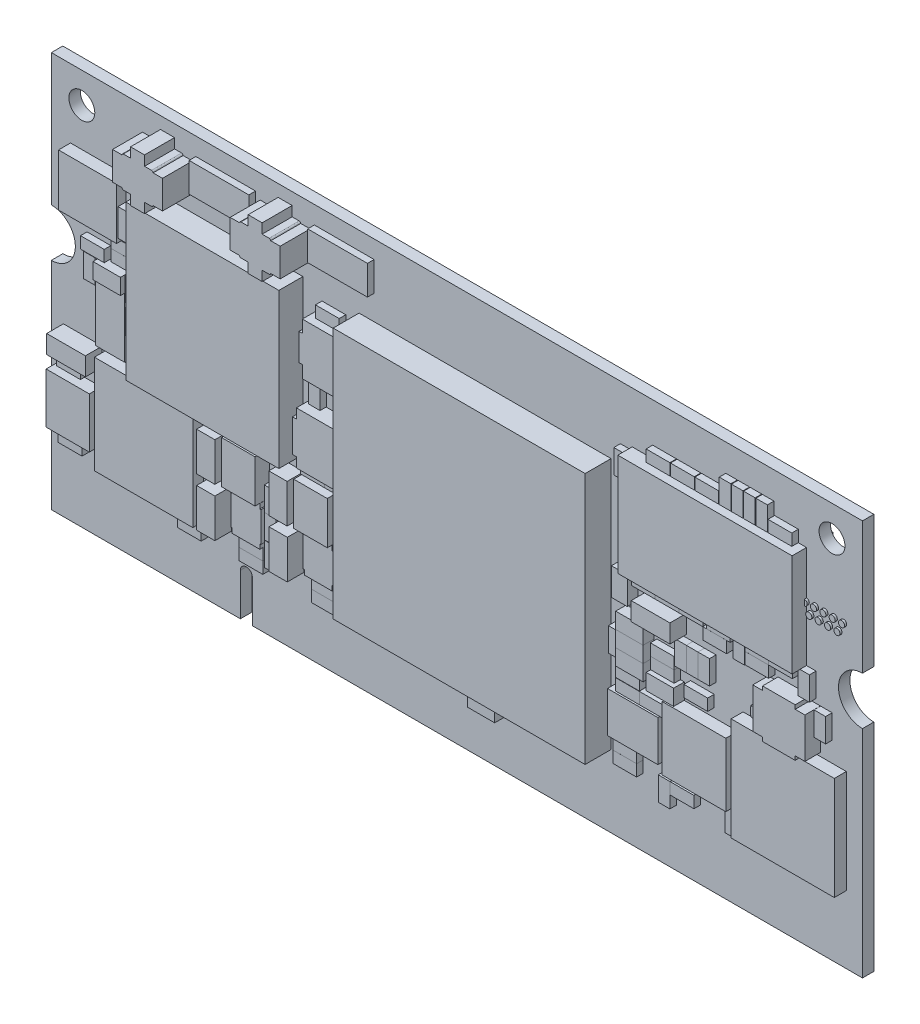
SolidWorks part; units mm, degrees
ref_plane "Front Plane" through (0, 0, 0) normal (0, 0, 1) x (1, 0, 0)
ref_plane "Top Plane" through (0, 0, 0) normal (0, 1, 0) x (1, 0, 0)
ref_plane "Right Plane" through (0, 0, 0) normal (1, 0, 0) x (0, 0, -1)
sketch "BOARD" plane through (0, 0, 0) normal (0, 0, 1) x (1, 0, 0)
  line L27 (75.2196, 28.006) -> (75.2196, 10.0051)
  line L28 (75.2196, 10.0051) -> (24.3688, 10.0051)
  line L29 (24.3688, 10.0051) -> (24.3688, 13.5052)
  line L30 (23.3705, 13.5052) -> (23.3705, 10.0051)
  line L31 (23.3705, 10.0051) -> (7.62, 10.0051)
  line L32 (7.62, 10.0051) -> (7.62, 28.006)
  line L33 (7.62, 32.004) -> (7.6195, 42.9992)
  line L34 (7.6195, 42.9992) -> (75.2196, 42.9992)
  line L35 (75.2196, 42.9992) -> (75.2196, 32.004)
  arc A18 (75.2196, 32.004) -> (73.2206, 30.005) centre (75.2196, 30.005) ccw
  arc A19 (73.2206, 30.005) -> (75.2196, 28.006) centre (75.2196, 30.005) ccw
  arc A20 (24.3688, 13.5052) -> (23.8709, 14.0056) centre (23.8697, 13.5064) ccw
  arc A21 (23.8709, 14.0056) -> (23.3705, 13.5052) centre (23.8709, 13.5052) ccw
  arc A22 (7.62, 28.006) -> (9.619, 30.005) centre (7.62, 30.005) ccw
  arc A23 (9.619, 30.005) -> (7.62, 32.004) centre (7.62, 30.005) ccw
ref_plane "Plane1" through (0, 0, 1) normal (0, 0, 1) x (1, 0, 0)
sketch "Sketch2" plane through (0, 0, 0) normal (0, 0, 1) x (1, 0, 0)
  line L0 (70.6064, 38.7962) -> (70.6064, 30.2618)
  line L1 (70.6064, 30.2618) -> (56.0776, 30.2618)
  line L2 (56.0776, 30.2618) -> (56.0776, 38.7962)
  line L3 (56.0776, 38.7962) -> (70.6064, 38.7962)
extrude "BGA96_0P8X14-1" add sketch "Sketch2" against normal blind 1.1999 separate body
sketch "Sketch3" plane through (0, 0, 1) normal (0, 0, 1) x (1, 0, 0)
  line L0 (70.6064, 30.2618) -> (70.6064, 38.7962)
  line L1 (70.6064, 38.7962) -> (56.0776, 38.7962)
  line L2 (56.0776, 38.7962) -> (56.0776, 30.2618)
  line L3 (56.0776, 30.2618) -> (70.6064, 30.2618)
extrude "BGA96_0P8X14-2" add sketch "Sketch3" along normal blind 1.1999 separate body
sketch "Sketch4" plane through (0, 0, 0) normal (0, 0, 1) x (1, 0, 0)
  line L0 (69.7126, 27.6349) -> (69.7126, 15.2352)
  line L1 (69.7126, 15.2352) -> (55.7126, 15.2352)
  line L2 (55.7126, 15.2352) -> (55.7126, 27.6349)
  line L3 (55.7126, 27.6349) -> (69.7126, 27.6349)
extrude "153_WFBGA-1" add sketch "Sketch4" against normal blind 0.8001 separate body
sketch "Sketch5" plane through (0, 0, 0) normal (0, 0, 1) x (1, 0, 0)
  line L0 (39.5044, 40.9611) -> (39.5044, 38.8772)
  line L1 (39.5044, 38.8772) -> (41.7604, 38.8772)
  line L2 (41.7604, 38.8772) -> (41.7604, 40.9611)
  line L3 (41.7604, 40.9611) -> (39.5044, 40.9611)
extrude "VSON008X2030-1" add sketch "Sketch5" against normal blind 0.5999 separate body
sketch "Sketch6" plane through (0, 0, 1) normal (0, 0, 1) x (1, 0, 0)
  line L0 (29.6873, 31.0667) -> (29.6873, 32.0916)
  line L1 (29.6873, 32.0916) -> (29.4122, 32.0916)
  line L2 (29.4122, 32.0916) -> (29.4122, 34.3497)
  line L3 (29.4122, 34.3497) -> (29.6873, 34.3497)
  line L4 (29.6873, 34.3497) -> (29.6873, 35.3746)
  line L5 (29.6873, 35.3746) -> (32.6951, 35.3746)
  line L6 (32.6951, 35.3746) -> (32.6951, 34.3497)
  line L7 (32.6951, 34.3497) -> (32.9702, 34.3497)
  line L8 (32.9702, 34.3497) -> (32.9702, 32.0916)
  line L9 (32.9702, 32.0916) -> (32.6951, 32.0916)
  line L10 (32.6951, 32.0916) -> (32.6951, 31.0667)
  line L11 (32.6951, 31.0667) -> (29.6873, 31.0667)
extrude "SOT23-6-1" add sketch "Sketch6" along normal blind 1.1001 separate body
sketch "Sketch30" plane through (0, 0, 1) normal (0, 0, 1) x (1, 0, 0)
  line L0 (55.1053, 28.9941) -> (55.1053, 29.624)
  line L1 (55.1053, 29.624) -> (55.0903, 29.624)
  line L2 (55.0903, 29.624) -> (55.0903, 29.7261)
  line L3 (55.0903, 29.7261) -> (54.7901, 29.7261)
  line L4 (54.7901, 29.7261) -> (54.7901, 29.624)
  line L5 (54.7901, 29.624) -> (54.7751, 29.624)
  line L6 (54.7751, 29.624) -> (54.7751, 28.9941)
  line L7 (54.7751, 28.9941) -> (54.7901, 28.9941)
  line L8 (54.7901, 28.9941) -> (54.7901, 28.892)
  line L9 (54.7901, 28.892) -> (55.0903, 28.892)
  line L10 (55.0903, 28.892) -> (55.0903, 28.9941)
  line L11 (55.0903, 28.9941) -> (55.1053, 28.9941)
extrude "C0201-1" add sketch "Sketch30" along normal blind 0.3299 separate body
sketch "Sketch31" plane through (0, 0, 0) normal (0, 0, 1) x (1, 0, 0)
  line L0 (48.5115, 23.5585) -> (47.8815, 23.5585)
  line L1 (47.8815, 23.5585) -> (47.8815, 23.5735)
  line L2 (47.8815, 23.5735) -> (47.7794, 23.5735)
  line L3 (47.7794, 23.5735) -> (47.7794, 23.8737)
  line L4 (47.7794, 23.8737) -> (47.8815, 23.8737)
  line L5 (47.8815, 23.8737) -> (47.8815, 23.8887)
  line L6 (47.8815, 23.8887) -> (48.5115, 23.8887)
  line L7 (48.5115, 23.8887) -> (48.5115, 23.8737)
  line L8 (48.5115, 23.8737) -> (48.6136, 23.8737)
  line L9 (48.6136, 23.8737) -> (48.6136, 23.5735)
  line L10 (48.6136, 23.5735) -> (48.5115, 23.5735)
  line L11 (48.5115, 23.5735) -> (48.5115, 23.5585)
extrude "C0201-2" add sketch "Sketch31" against normal blind 0.3299 separate body
sketch "Sketch32" plane through (0, 0, 0) normal (0, 0, 1) x (1, 0, 0)
  line L0 (40.8864, 25.9334) -> (41.5163, 25.9334)
  line L1 (41.5163, 25.9334) -> (41.5163, 25.9184)
  line L2 (41.5163, 25.9184) -> (41.6184, 25.9184)
  line L3 (41.6184, 25.9184) -> (41.6184, 25.6182)
  line L4 (41.6184, 25.6182) -> (41.5163, 25.6182)
  line L5 (41.5163, 25.6182) -> (41.5163, 25.6032)
  line L6 (41.5163, 25.6032) -> (40.8864, 25.6032)
  line L7 (40.8864, 25.6032) -> (40.8864, 25.6182)
  line L8 (40.8864, 25.6182) -> (40.7843, 25.6182)
  line L9 (40.7843, 25.6182) -> (40.7843, 25.9184)
  line L10 (40.7843, 25.9184) -> (40.8864, 25.9184)
  line L11 (40.8864, 25.9184) -> (40.8864, 25.9334)
extrude "C0201-3" add sketch "Sketch32" against normal blind 0.3299 separate body
sketch "Sketch33" plane through (0, 0, 0) normal (0, 0, 1) x (1, 0, 0)
  line L0 (47.5, 28.3334) -> (48.13, 28.3334)
  line L1 (48.13, 28.3334) -> (48.13, 28.3185)
  line L2 (48.13, 28.3185) -> (48.2321, 28.3185)
  line L3 (48.2321, 28.3185) -> (48.2321, 28.0182)
  line L4 (48.2321, 28.0182) -> (48.13, 28.0182)
  line L5 (48.13, 28.0182) -> (48.13, 28.0032)
  line L6 (48.13, 28.0032) -> (47.5, 28.0032)
  line L7 (47.5, 28.0032) -> (47.5, 28.0182)
  line L8 (47.5, 28.0182) -> (47.3979, 28.0182)
  line L9 (47.3979, 28.0182) -> (47.3979, 28.3185)
  line L10 (47.3979, 28.3185) -> (47.5, 28.3185)
  line L11 (47.5, 28.3185) -> (47.5, 28.3334)
extrude "C0201-4" add sketch "Sketch33" against normal blind 0.3299 separate body
sketch "Sketch34" plane through (0, 0, 0) normal (0, 0, 1) x (1, 0, 0)
  line L0 (49.3116, 26.5049) -> (48.6816, 26.5049)
  line L1 (48.6816, 26.5049) -> (48.6816, 26.5199)
  line L2 (48.6816, 26.5199) -> (48.5795, 26.5199)
  line L3 (48.5795, 26.5199) -> (48.5795, 26.8201)
  line L4 (48.5795, 26.8201) -> (48.6816, 26.8201)
  line L5 (48.6816, 26.8201) -> (48.6816, 26.8351)
  line L6 (48.6816, 26.8351) -> (49.3116, 26.8351)
  line L7 (49.3116, 26.8351) -> (49.3116, 26.8201)
  line L8 (49.3116, 26.8201) -> (49.4137, 26.8201)
  line L9 (49.4137, 26.8201) -> (49.4137, 26.5199)
  line L10 (49.4137, 26.5199) -> (49.3116, 26.5199)
  line L11 (49.3116, 26.5199) -> (49.3116, 26.5049)
extrude "C0201-5" add sketch "Sketch34" against normal blind 0.3299 separate body
sketch "Sketch35" plane through (0, 0, 0) normal (0, 0, 1) x (1, 0, 0)
  line L0 (48.3845, 21.717) -> (47.7545, 21.717)
  line L1 (47.7545, 21.717) -> (47.7545, 21.732)
  line L2 (47.7545, 21.732) -> (47.6524, 21.732)
  line L3 (47.6524, 21.732) -> (47.6524, 22.0322)
  line L4 (47.6524, 22.0322) -> (47.7545, 22.0322)
  line L5 (47.7545, 22.0322) -> (47.7545, 22.0472)
  line L6 (47.7545, 22.0472) -> (48.3845, 22.0472)
  line L7 (48.3845, 22.0472) -> (48.3845, 22.0322)
  line L8 (48.3845, 22.0322) -> (48.4866, 22.0322)
  line L9 (48.4866, 22.0322) -> (48.4866, 21.732)
  line L10 (48.4866, 21.732) -> (48.3845, 21.732)
  line L11 (48.3845, 21.732) -> (48.3845, 21.717)
extrude "C0201-6" add sketch "Sketch35" against normal blind 0.3299 separate body
sketch "Sketch36" plane through (0, 0, 0) normal (0, 0, 1) x (1, 0, 0)
  line L0 (45.5803, 30.6921) -> (45.5803, 30.0622)
  line L1 (45.5803, 30.0622) -> (45.5653, 30.0622)
  line L2 (45.5653, 30.0622) -> (45.5653, 29.9601)
  line L3 (45.5653, 29.9601) -> (45.2651, 29.9601)
  line L4 (45.2651, 29.9601) -> (45.2651, 30.0622)
  line L5 (45.2651, 30.0622) -> (45.2501, 30.0622)
  line L6 (45.2501, 30.0622) -> (45.2501, 30.6921)
  line L7 (45.2501, 30.6921) -> (45.2651, 30.6921)
  line L8 (45.2651, 30.6921) -> (45.2651, 30.7942)
  line L9 (45.2651, 30.7942) -> (45.5653, 30.7942)
  line L10 (45.5653, 30.7942) -> (45.5653, 30.6921)
  line L11 (45.5653, 30.6921) -> (45.5803, 30.6921)
extrude "C0201-7" add sketch "Sketch36" against normal blind 0.3299 separate body
sketch "Sketch37" plane through (0, 0, 0) normal (0, 0, 1) x (1, 0, 0)
  line L0 (43.5483, 30.7213) -> (43.5483, 31.3512)
  line L1 (43.5483, 31.3512) -> (43.5633, 31.3512)
  line L2 (43.5633, 31.3512) -> (43.5633, 31.4533)
  line L3 (43.5633, 31.4533) -> (43.8635, 31.4533)
  line L4 (43.8635, 31.4533) -> (43.8635, 31.3512)
  line L5 (43.8635, 31.3512) -> (43.8785, 31.3512)
  line L6 (43.8785, 31.3512) -> (43.8785, 30.7213)
  line L7 (43.8785, 30.7213) -> (43.8635, 30.7213)
  line L8 (43.8635, 30.7213) -> (43.8635, 30.6192)
  line L9 (43.8635, 30.6192) -> (43.5633, 30.6192)
  line L10 (43.5633, 30.6192) -> (43.5633, 30.7213)
  line L11 (43.5633, 30.7213) -> (43.5483, 30.7213)
extrude "C0201-8" add sketch "Sketch37" against normal blind 0.3299 separate body
sketch "Sketch38" plane through (0, 0, 0) normal (0, 0, 1) x (1, 0, 0)
  line L0 (40.8838, 22.1082) -> (41.5138, 22.1082)
  line L1 (41.5138, 22.1082) -> (41.5138, 22.0932)
  line L2 (41.5138, 22.0932) -> (41.6159, 22.0932)
  line L3 (41.6159, 22.0932) -> (41.6159, 21.7929)
  line L4 (41.6159, 21.7929) -> (41.5138, 21.7929)
  line L5 (41.5138, 21.7929) -> (41.5138, 21.778)
  line L6 (41.5138, 21.778) -> (40.8838, 21.778)
  line L7 (40.8838, 21.778) -> (40.8838, 21.7929)
  line L8 (40.8838, 21.7929) -> (40.7817, 21.7929)
  line L9 (40.7817, 21.7929) -> (40.7817, 22.0932)
  line L10 (40.7817, 22.0932) -> (40.8838, 22.0932)
  line L11 (40.8838, 22.0932) -> (40.8838, 22.1082)
extrude "C0201-9" add sketch "Sketch38" against normal blind 0.3299 separate body
sketch "Sketch39" plane through (0, 0, 0) normal (0, 0, 1) x (1, 0, 0)
  line L0 (45.1485, 21.8567) -> (45.1485, 22.4866)
  line L1 (45.1485, 22.4866) -> (45.1635, 22.4866)
  line L2 (45.1635, 22.4866) -> (45.1635, 22.5887)
  line L3 (45.1635, 22.5887) -> (45.4637, 22.5887)
  line L4 (45.4637, 22.5887) -> (45.4637, 22.4866)
  line L5 (45.4637, 22.4866) -> (45.4787, 22.4866)
  line L6 (45.4787, 22.4866) -> (45.4787, 21.8567)
  line L7 (45.4787, 21.8567) -> (45.4637, 21.8567)
  line L8 (45.4637, 21.8567) -> (45.4637, 21.7546)
  line L9 (45.4637, 21.7546) -> (45.1635, 21.7546)
  line L10 (45.1635, 21.7546) -> (45.1635, 21.8567)
  line L11 (45.1635, 21.8567) -> (45.1485, 21.8567)
extrude "C0201-10" add sketch "Sketch39" against normal blind 0.3299 separate body
sketch "Sketch40" plane through (0, 0, 0) normal (0, 0, 1) x (1, 0, 0)
  line L0 (39.0804, 28.1051) -> (39.7104, 28.1051)
  line L1 (39.7104, 28.1051) -> (39.7104, 28.0901)
  line L2 (39.7104, 28.0901) -> (39.8125, 28.0901)
  line L3 (39.8125, 28.0901) -> (39.8125, 27.7899)
  line L4 (39.8125, 27.7899) -> (39.7104, 27.7899)
  line L5 (39.7104, 27.7899) -> (39.7104, 27.7749)
  line L6 (39.7104, 27.7749) -> (39.0804, 27.7749)
  line L7 (39.0804, 27.7749) -> (39.0804, 27.7899)
  line L8 (39.0804, 27.7899) -> (38.9783, 27.7899)
  line L9 (38.9783, 27.7899) -> (38.9783, 28.0901)
  line L10 (38.9783, 28.0901) -> (39.0804, 28.0901)
  line L11 (39.0804, 28.0901) -> (39.0804, 28.1051)
extrude "C0201-11" add sketch "Sketch40" against normal blind 0.3299 separate body
sketch "Sketch41" plane through (0, 0, 0) normal (0, 0, 1) x (1, 0, 0)
  line L0 (46.2763, 21.4224) -> (46.9062, 21.4224)
  line L1 (46.9062, 21.4224) -> (46.9062, 21.4074)
  line L2 (46.9062, 21.4074) -> (47.0083, 21.4074)
  line L3 (47.0083, 21.4074) -> (47.0083, 21.1071)
  line L4 (47.0083, 21.1071) -> (46.9062, 21.1071)
  line L5 (46.9062, 21.1071) -> (46.9062, 21.0922)
  line L6 (46.9062, 21.0922) -> (46.2763, 21.0922)
  line L7 (46.2763, 21.0922) -> (46.2763, 21.1071)
  line L8 (46.2763, 21.1071) -> (46.1742, 21.1071)
  line L9 (46.1742, 21.1071) -> (46.1742, 21.4074)
  line L10 (46.1742, 21.4074) -> (46.2763, 21.4074)
  line L11 (46.2763, 21.4074) -> (46.2763, 21.4224)
extrude "C0201-12" add sketch "Sketch41" against normal blind 0.3299 separate body
sketch "Sketch42" plane through (0, 0, 0) normal (0, 0, 1) x (1, 0, 0)
  line L0 (47.0281, 22.4384) -> (47.0281, 21.8084)
  line L1 (47.0281, 21.8084) -> (47.0131, 21.8084)
  line L2 (47.0131, 21.8084) -> (47.0131, 21.7063)
  line L3 (47.0131, 21.7063) -> (46.7129, 21.7063)
  line L4 (46.7129, 21.7063) -> (46.7129, 21.8084)
  line L5 (46.7129, 21.8084) -> (46.6979, 21.8084)
  line L6 (46.6979, 21.8084) -> (46.6979, 22.4384)
  line L7 (46.6979, 22.4384) -> (46.7129, 22.4384)
  line L8 (46.7129, 22.4384) -> (46.7129, 22.5405)
  line L9 (46.7129, 22.5405) -> (47.0131, 22.5405)
  line L10 (47.0131, 22.5405) -> (47.0131, 22.4384)
  line L11 (47.0131, 22.4384) -> (47.0281, 22.4384)
extrude "C0201-13" add sketch "Sketch42" against normal blind 0.3299 separate body
sketch "Sketch43" plane through (0, 0, 0) normal (0, 0, 1) x (1, 0, 0)
  line L0 (46.4871, 22.4401) -> (46.4871, 21.8102)
  line L1 (46.4871, 21.8102) -> (46.4721, 21.8102)
  line L2 (46.4721, 21.8102) -> (46.4721, 21.7081)
  line L3 (46.4721, 21.7081) -> (46.1719, 21.7081)
  line L4 (46.1719, 21.7081) -> (46.1719, 21.8102)
  line L5 (46.1719, 21.8102) -> (46.1569, 21.8102)
  line L6 (46.1569, 21.8102) -> (46.1569, 22.4401)
  line L7 (46.1569, 22.4401) -> (46.1719, 22.4401)
  line L8 (46.1719, 22.4401) -> (46.1719, 22.5422)
  line L9 (46.1719, 22.5422) -> (46.4721, 22.5422)
  line L10 (46.4721, 22.5422) -> (46.4721, 22.4401)
  line L11 (46.4721, 22.4401) -> (46.4871, 22.4401)
extrude "C0201-14" add sketch "Sketch43" against normal blind 0.3299 separate body
sketch "Sketch44" plane through (0, 0, 0) normal (0, 0, 1) x (1, 0, 0)
  line L0 (49.6951, 24.925) -> (49.6951, 24.2951)
  line L1 (49.6951, 24.2951) -> (49.6801, 24.2951)
  line L2 (49.6801, 24.2951) -> (49.6801, 24.193)
  line L3 (49.6801, 24.193) -> (49.3799, 24.193)
  line L4 (49.3799, 24.193) -> (49.3799, 24.2951)
  line L5 (49.3799, 24.2951) -> (49.3649, 24.2951)
  line L6 (49.3649, 24.2951) -> (49.3649, 24.925)
  line L7 (49.3649, 24.925) -> (49.3799, 24.925)
  line L8 (49.3799, 24.925) -> (49.3799, 25.0271)
  line L9 (49.3799, 25.0271) -> (49.6801, 25.0271)
  line L10 (49.6801, 25.0271) -> (49.6801, 24.925)
  line L11 (49.6801, 24.925) -> (49.6951, 24.925)
extrude "C0201-15" add sketch "Sketch44" against normal blind 0.3299 separate body
sketch "Sketch45" plane through (0, 0, 0) normal (0, 0, 1) x (1, 0, 0)
  line L0 (46.53, 28.8033) -> (45.9001, 28.8033)
  line L1 (45.9001, 28.8033) -> (45.9001, 28.8183)
  line L2 (45.9001, 28.8183) -> (45.798, 28.8183)
  line L3 (45.798, 28.8183) -> (45.798, 29.1186)
  line L4 (45.798, 29.1186) -> (45.9001, 29.1186)
  line L5 (45.9001, 29.1186) -> (45.9001, 29.1335)
  line L6 (45.9001, 29.1335) -> (46.53, 29.1335)
  line L7 (46.53, 29.1335) -> (46.53, 29.1186)
  line L8 (46.53, 29.1186) -> (46.6321, 29.1186)
  line L9 (46.6321, 29.1186) -> (46.6321, 28.8183)
  line L10 (46.6321, 28.8183) -> (46.53, 28.8183)
  line L11 (46.53, 28.8183) -> (46.53, 28.8033)
extrude "C0201-16" add sketch "Sketch45" against normal blind 0.3299 separate body
sketch "Sketch46" plane through (0, 0, 0) normal (0, 0, 1) x (1, 0, 0)
  line L0 (40.9301, 28.0032) -> (40.3001, 28.0032)
  line L1 (40.3001, 28.0032) -> (40.3001, 28.0182)
  line L2 (40.3001, 28.0182) -> (40.198, 28.0182)
  line L3 (40.198, 28.0182) -> (40.198, 28.3185)
  line L4 (40.198, 28.3185) -> (40.3001, 28.3185)
  line L5 (40.3001, 28.3185) -> (40.3001, 28.3334)
  line L6 (40.3001, 28.3334) -> (40.9301, 28.3334)
  line L7 (40.9301, 28.3334) -> (40.9301, 28.3185)
  line L8 (40.9301, 28.3185) -> (41.0322, 28.3185)
  line L9 (41.0322, 28.3185) -> (41.0322, 28.0182)
  line L10 (41.0322, 28.0182) -> (40.9301, 28.0182)
  line L11 (40.9301, 28.0182) -> (40.9301, 28.0032)
extrude "C0201-17" add sketch "Sketch46" against normal blind 0.3299 separate body
sketch "Sketch47" plane through (0, 0, 0) normal (0, 0, 1) x (1, 0, 0)
  line L0 (40.9301, 28.8033) -> (40.3001, 28.8033)
  line L1 (40.3001, 28.8033) -> (40.3001, 28.8183)
  line L2 (40.3001, 28.8183) -> (40.198, 28.8183)
  line L3 (40.198, 28.8183) -> (40.198, 29.1186)
  line L4 (40.198, 29.1186) -> (40.3001, 29.1186)
  line L5 (40.3001, 29.1186) -> (40.3001, 29.1335)
  line L6 (40.3001, 29.1335) -> (40.9301, 29.1335)
  line L7 (40.9301, 29.1335) -> (40.9301, 29.1186)
  line L8 (40.9301, 29.1186) -> (41.0322, 29.1186)
  line L9 (41.0322, 29.1186) -> (41.0322, 28.8183)
  line L10 (41.0322, 28.8183) -> (40.9301, 28.8183)
  line L11 (40.9301, 28.8183) -> (40.9301, 28.8033)
extrude "C0201-18" add sketch "Sketch47" against normal blind 0.3299 separate body
sketch "Sketch48" plane through (0, 0, 0) normal (0, 0, 1) x (1, 0, 0)
  line L0 (40.9301, 29.6032) -> (40.3001, 29.6032)
  line L1 (40.3001, 29.6032) -> (40.3001, 29.6182)
  line L2 (40.3001, 29.6182) -> (40.198, 29.6182)
  line L3 (40.198, 29.6182) -> (40.198, 29.9184)
  line L4 (40.198, 29.9184) -> (40.3001, 29.9184)
  line L5 (40.3001, 29.9184) -> (40.3001, 29.9334)
  line L6 (40.3001, 29.9334) -> (40.9301, 29.9334)
  line L7 (40.9301, 29.9334) -> (40.9301, 29.9184)
  line L8 (40.9301, 29.9184) -> (41.0322, 29.9184)
  line L9 (41.0322, 29.9184) -> (41.0322, 29.6182)
  line L10 (41.0322, 29.6182) -> (40.9301, 29.6182)
  line L11 (40.9301, 29.6182) -> (40.9301, 29.6032)
extrude "C0201-19" add sketch "Sketch48" against normal blind 0.3299 separate body
sketch "Sketch49" plane through (0, 0, 0) normal (0, 0, 1) x (1, 0, 0)
  line L0 (45.9593, 28.0276) -> (45.3293, 28.0276)
  line L1 (45.3293, 28.0276) -> (45.3293, 28.0426)
  line L2 (45.3293, 28.0426) -> (45.2272, 28.0426)
  line L3 (45.2272, 28.0426) -> (45.2272, 28.3428)
  line L4 (45.2272, 28.3428) -> (45.3293, 28.3428)
  line L5 (45.3293, 28.3428) -> (45.3293, 28.3578)
  line L6 (45.3293, 28.3578) -> (45.9593, 28.3578)
  line L7 (45.9593, 28.3578) -> (45.9593, 28.3428)
  line L8 (45.9593, 28.3428) -> (46.0614, 28.3428)
  line L9 (46.0614, 28.3428) -> (46.0614, 28.0426)
  line L10 (46.0614, 28.0426) -> (45.9593, 28.0426)
  line L11 (45.9593, 28.0426) -> (45.9593, 28.0276)
extrude "C0201-20" add sketch "Sketch49" against normal blind 0.3299 separate body
sketch "Sketch50" plane through (0, 0, 0) normal (0, 0, 1) x (1, 0, 0)
  line L0 (48.5115, 22.2758) -> (47.8815, 22.2758)
  line L1 (47.8815, 22.2758) -> (47.8815, 22.2908)
  line L2 (47.8815, 22.2908) -> (47.7794, 22.2908)
  line L3 (47.7794, 22.2908) -> (47.7794, 22.591)
  line L4 (47.7794, 22.591) -> (47.8815, 22.591)
  line L5 (47.8815, 22.591) -> (47.8815, 22.606)
  line L6 (47.8815, 22.606) -> (48.5115, 22.606)
  line L7 (48.5115, 22.606) -> (48.5115, 22.591)
  line L8 (48.5115, 22.591) -> (48.6136, 22.591)
  line L9 (48.6136, 22.591) -> (48.6136, 22.2908)
  line L10 (48.6136, 22.2908) -> (48.5115, 22.2908)
  line L11 (48.5115, 22.2908) -> (48.5115, 22.2758)
extrude "C0201-21" add sketch "Sketch50" against normal blind 0.3299 separate body
sketch "Sketch51" plane through (0, 0, 0) normal (0, 0, 1) x (1, 0, 0)
  line L0 (46.5554, 29.6032) -> (45.9255, 29.6032)
  line L1 (45.9255, 29.6032) -> (45.9255, 29.6182)
  line L2 (45.9255, 29.6182) -> (45.8234, 29.6182)
  line L3 (45.8234, 29.6182) -> (45.8234, 29.9184)
  line L4 (45.8234, 29.9184) -> (45.9255, 29.9184)
  line L5 (45.9255, 29.9184) -> (45.9255, 29.9334)
  line L6 (45.9255, 29.9334) -> (46.5554, 29.9334)
  line L7 (46.5554, 29.9334) -> (46.5554, 29.9184)
  line L8 (46.5554, 29.9184) -> (46.6575, 29.9184)
  line L9 (46.6575, 29.9184) -> (46.6575, 29.6182)
  line L10 (46.6575, 29.6182) -> (46.5554, 29.6182)
  line L11 (46.5554, 29.6182) -> (46.5554, 29.6032)
extrude "C0201-22" add sketch "Sketch51" against normal blind 0.3299 separate body
sketch "Sketch52" plane through (0, 0, 0) normal (0, 0, 1) x (1, 0, 0)
  line L0 (40.257, 23.2034) -> (39.627, 23.2034)
  line L1 (39.627, 23.2034) -> (39.627, 23.2184)
  line L2 (39.627, 23.2184) -> (39.5249, 23.2184)
  line L3 (39.5249, 23.2184) -> (39.5249, 23.5186)
  line L4 (39.5249, 23.5186) -> (39.627, 23.5186)
  line L5 (39.627, 23.5186) -> (39.627, 23.5336)
  line L6 (39.627, 23.5336) -> (40.257, 23.5336)
  line L7 (40.257, 23.5336) -> (40.257, 23.5186)
  line L8 (40.257, 23.5186) -> (40.3591, 23.5186)
  line L9 (40.3591, 23.5186) -> (40.3591, 23.2184)
  line L10 (40.3591, 23.2184) -> (40.257, 23.2184)
  line L11 (40.257, 23.2184) -> (40.257, 23.2034)
extrude "C0201-23" add sketch "Sketch52" against normal blind 0.3299 separate body
sketch "Sketch53" plane through (0, 0, 0) normal (0, 0, 1) x (1, 0, 0)
  line L0 (40.257, 22.4033) -> (39.627, 22.4033)
  line L1 (39.627, 22.4033) -> (39.627, 22.4183)
  line L2 (39.627, 22.4183) -> (39.5249, 22.4183)
  line L3 (39.5249, 22.4183) -> (39.5249, 22.7185)
  line L4 (39.5249, 22.7185) -> (39.627, 22.7185)
  line L5 (39.627, 22.7185) -> (39.627, 22.7335)
  line L6 (39.627, 22.7335) -> (40.257, 22.7335)
  line L7 (40.257, 22.7335) -> (40.257, 22.7185)
  line L8 (40.257, 22.7185) -> (40.3591, 22.7185)
  line L9 (40.3591, 22.7185) -> (40.3591, 22.4183)
  line L10 (40.3591, 22.4183) -> (40.257, 22.4183)
  line L11 (40.257, 22.4183) -> (40.257, 22.4033)
extrude "C0201-24" add sketch "Sketch53" against normal blind 0.3299 separate body
sketch "Sketch54" plane through (0, 0, 0) normal (0, 0, 1) x (1, 0, 0)
  line L0 (42.53, 28.0032) -> (41.9001, 28.0032)
  line L1 (41.9001, 28.0032) -> (41.9001, 28.0182)
  line L2 (41.9001, 28.0182) -> (41.798, 28.0182)
  line L3 (41.798, 28.0182) -> (41.798, 28.3185)
  line L4 (41.798, 28.3185) -> (41.9001, 28.3185)
  line L5 (41.9001, 28.3185) -> (41.9001, 28.3334)
  line L6 (41.9001, 28.3334) -> (42.53, 28.3334)
  line L7 (42.53, 28.3334) -> (42.53, 28.3185)
  line L8 (42.53, 28.3185) -> (42.6321, 28.3185)
  line L9 (42.6321, 28.3185) -> (42.6321, 28.0182)
  line L10 (42.6321, 28.0182) -> (42.53, 28.0182)
  line L11 (42.53, 28.0182) -> (42.53, 28.0032)
extrude "C0201-25" add sketch "Sketch54" against normal blind 0.3299 separate body
sketch "Sketch55" plane through (0, 0, 0) normal (0, 0, 1) x (1, 0, 0)
  line L0 (39.3299, 29.6032) -> (38.6999, 29.6032)
  line L1 (38.6999, 29.6032) -> (38.6999, 29.6182)
  line L2 (38.6999, 29.6182) -> (38.5978, 29.6182)
  line L3 (38.5978, 29.6182) -> (38.5978, 29.9184)
  line L4 (38.5978, 29.9184) -> (38.6999, 29.9184)
  line L5 (38.6999, 29.9184) -> (38.6999, 29.9334)
  line L6 (38.6999, 29.9334) -> (39.3299, 29.9334)
  line L7 (39.3299, 29.9334) -> (39.3299, 29.9184)
  line L8 (39.3299, 29.9184) -> (39.432, 29.9184)
  line L9 (39.432, 29.9184) -> (39.432, 29.6182)
  line L10 (39.432, 29.6182) -> (39.3299, 29.6182)
  line L11 (39.3299, 29.6182) -> (39.3299, 29.6032)
extrude "C0201-26" add sketch "Sketch55" against normal blind 0.3299 separate body
sketch "Sketch56" plane through (0, 0, 0) normal (0, 0, 1) x (1, 0, 0)
  line L0 (39.3299, 30.4033) -> (38.6999, 30.4033)
  line L1 (38.6999, 30.4033) -> (38.6999, 30.4183)
  line L2 (38.6999, 30.4183) -> (38.5978, 30.4183)
  line L3 (38.5978, 30.4183) -> (38.5978, 30.7185)
  line L4 (38.5978, 30.7185) -> (38.6999, 30.7185)
  line L5 (38.6999, 30.7185) -> (38.6999, 30.7335)
  line L6 (38.6999, 30.7335) -> (39.3299, 30.7335)
  line L7 (39.3299, 30.7335) -> (39.3299, 30.7185)
  line L8 (39.3299, 30.7185) -> (39.432, 30.7185)
  line L9 (39.432, 30.7185) -> (39.432, 30.4183)
  line L10 (39.432, 30.4183) -> (39.3299, 30.4183)
  line L11 (39.3299, 30.4183) -> (39.3299, 30.4033)
extrude "C0201-27" add sketch "Sketch56" against normal blind 0.3299 separate body
sketch "Sketch57" plane through (0, 0, 0) normal (0, 0, 1) x (1, 0, 0)
  line L0 (39.3299, 28.8033) -> (38.6999, 28.8033)
  line L1 (38.6999, 28.8033) -> (38.6999, 28.8183)
  line L2 (38.6999, 28.8183) -> (38.5978, 28.8183)
  line L3 (38.5978, 28.8183) -> (38.5978, 29.1186)
  line L4 (38.5978, 29.1186) -> (38.6999, 29.1186)
  line L5 (38.6999, 29.1186) -> (38.6999, 29.1335)
  line L6 (38.6999, 29.1335) -> (39.3299, 29.1335)
  line L7 (39.3299, 29.1335) -> (39.3299, 29.1186)
  line L8 (39.3299, 29.1186) -> (39.432, 29.1186)
  line L9 (39.432, 29.1186) -> (39.432, 28.8183)
  line L10 (39.432, 28.8183) -> (39.3299, 28.8183)
  line L11 (39.3299, 28.8183) -> (39.3299, 28.8033)
extrude "C0201-28" add sketch "Sketch57" against normal blind 0.3299 separate body
sketch "Sketch58" plane through (0, 0, 0) normal (0, 0, 1) x (1, 0, 0)
  line L0 (40.45, 31.0535) -> (40.45, 31.6835)
  line L1 (40.45, 31.6835) -> (40.465, 31.6835)
  line L2 (40.465, 31.6835) -> (40.465, 31.7856)
  line L3 (40.465, 31.7856) -> (40.7652, 31.7856)
  line L4 (40.7652, 31.7856) -> (40.7652, 31.6835)
  line L5 (40.7652, 31.6835) -> (40.7802, 31.6835)
  line L6 (40.7802, 31.6835) -> (40.7802, 31.0535)
  line L7 (40.7802, 31.0535) -> (40.7652, 31.0535)
  line L8 (40.7652, 31.0535) -> (40.7652, 30.9514)
  line L9 (40.7652, 30.9514) -> (40.465, 30.9514)
  line L10 (40.465, 30.9514) -> (40.465, 31.0535)
  line L11 (40.465, 31.0535) -> (40.45, 31.0535)
extrude "C0201-29" add sketch "Sketch58" against normal blind 0.3299 separate body
sketch "Sketch59" plane through (0, 0, 0) normal (0, 0, 1) x (1, 0, 0)
  line L0 (39.6499, 31.0535) -> (39.6499, 31.6835)
  line L1 (39.6499, 31.6835) -> (39.6649, 31.6835)
  line L2 (39.6649, 31.6835) -> (39.6649, 31.7856)
  line L3 (39.6649, 31.7856) -> (39.9651, 31.7856)
  line L4 (39.9651, 31.7856) -> (39.9651, 31.6835)
  line L5 (39.9651, 31.6835) -> (39.9801, 31.6835)
  line L6 (39.9801, 31.6835) -> (39.9801, 31.0535)
  line L7 (39.9801, 31.0535) -> (39.9651, 31.0535)
  line L8 (39.9651, 31.0535) -> (39.9651, 30.9514)
  line L9 (39.9651, 30.9514) -> (39.6649, 30.9514)
  line L10 (39.6649, 30.9514) -> (39.6649, 31.0535)
  line L11 (39.6649, 31.0535) -> (39.6499, 31.0535)
extrude "C0201-30" add sketch "Sketch59" against normal blind 0.3299 separate body
sketch "Sketch60" plane through (0, 0, 0) normal (0, 0, 1) x (1, 0, 0)
  line L0 (46.85, 31.0535) -> (46.85, 31.6835)
  line L1 (46.85, 31.6835) -> (46.865, 31.6835)
  line L2 (46.865, 31.6835) -> (46.865, 31.7856)
  line L3 (46.865, 31.7856) -> (47.1653, 31.7856)
  line L4 (47.1653, 31.7856) -> (47.1653, 31.6835)
  line L5 (47.1653, 31.6835) -> (47.1802, 31.6835)
  line L6 (47.1802, 31.6835) -> (47.1802, 31.0535)
  line L7 (47.1802, 31.0535) -> (47.1653, 31.0535)
  line L8 (47.1653, 31.0535) -> (47.1653, 30.9514)
  line L9 (47.1653, 30.9514) -> (46.865, 30.9514)
  line L10 (46.865, 30.9514) -> (46.865, 31.0535)
  line L11 (46.865, 31.0535) -> (46.85, 31.0535)
extrude "C0201-31" add sketch "Sketch60" against normal blind 0.3299 separate body
sketch "Sketch61" plane through (0, 0, 0) normal (0, 0, 1) x (1, 0, 0)
  line L0 (44.45, 31.0535) -> (44.45, 31.6835)
  line L1 (44.45, 31.6835) -> (44.465, 31.6835)
  line L2 (44.465, 31.6835) -> (44.465, 31.7856)
  line L3 (44.465, 31.7856) -> (44.7652, 31.7856)
  line L4 (44.7652, 31.7856) -> (44.7652, 31.6835)
  line L5 (44.7652, 31.6835) -> (44.7802, 31.6835)
  line L6 (44.7802, 31.6835) -> (44.7802, 31.0535)
  line L7 (44.7802, 31.0535) -> (44.7652, 31.0535)
  line L8 (44.7652, 31.0535) -> (44.7652, 30.9514)
  line L9 (44.7652, 30.9514) -> (44.465, 30.9514)
  line L10 (44.465, 30.9514) -> (44.465, 31.0535)
  line L11 (44.465, 31.0535) -> (44.45, 31.0535)
extrude "C0201-32" add sketch "Sketch61" against normal blind 0.3299 separate body
sketch "Sketch62" plane through (0, 0, 0) normal (0, 0, 1) x (1, 0, 0)
  line L0 (45.2498, 31.1551) -> (45.2498, 31.7851)
  line L1 (45.2498, 31.7851) -> (45.2648, 31.7851)
  line L2 (45.2648, 31.7851) -> (45.2648, 31.8872)
  line L3 (45.2648, 31.8872) -> (45.5651, 31.8872)
  line L4 (45.5651, 31.8872) -> (45.5651, 31.7851)
  line L5 (45.5651, 31.7851) -> (45.58, 31.7851)
  line L6 (45.58, 31.7851) -> (45.58, 31.1551)
  line L7 (45.58, 31.1551) -> (45.5651, 31.1551)
  line L8 (45.5651, 31.1551) -> (45.5651, 31.053)
  line L9 (45.5651, 31.053) -> (45.2648, 31.053)
  line L10 (45.2648, 31.053) -> (45.2648, 31.1551)
  line L11 (45.2648, 31.1551) -> (45.2498, 31.1551)
extrude "C0201-33" add sketch "Sketch62" against normal blind 0.3299 separate body
sketch "Sketch63" plane through (0, 0, 0) normal (0, 0, 1) x (1, 0, 0)
  line L0 (46.0499, 31.0535) -> (46.0499, 31.6835)
  line L1 (46.0499, 31.6835) -> (46.0649, 31.6835)
  line L2 (46.0649, 31.6835) -> (46.0649, 31.7856)
  line L3 (46.0649, 31.7856) -> (46.3652, 31.7856)
  line L4 (46.3652, 31.7856) -> (46.3652, 31.6835)
  line L5 (46.3652, 31.6835) -> (46.3801, 31.6835)
  line L6 (46.3801, 31.6835) -> (46.3801, 31.0535)
  line L7 (46.3801, 31.0535) -> (46.3652, 31.0535)
  line L8 (46.3652, 31.0535) -> (46.3652, 30.9514)
  line L9 (46.3652, 30.9514) -> (46.0649, 30.9514)
  line L10 (46.0649, 30.9514) -> (46.0649, 31.0535)
  line L11 (46.0649, 31.0535) -> (46.0499, 31.0535)
extrude "C0201-34" add sketch "Sketch63" against normal blind 0.3299 separate body
sketch "Sketch64" plane through (0, 0, 1) normal (0, 0, 1) x (1, 0, 0)
  line L0 (66.6115, 24.6761) -> (66.6115, 25.306)
  line L1 (66.6115, 25.306) -> (66.5965, 25.306)
  line L2 (66.5965, 25.306) -> (66.5965, 25.4081)
  line L3 (66.5965, 25.4081) -> (66.2963, 25.4081)
  line L4 (66.2963, 25.4081) -> (66.2963, 25.306)
  line L5 (66.2963, 25.306) -> (66.2813, 25.306)
  line L6 (66.2813, 25.306) -> (66.2813, 24.6761)
  line L7 (66.2813, 24.6761) -> (66.2963, 24.6761)
  line L8 (66.2963, 24.6761) -> (66.2963, 24.574)
  line L9 (66.2963, 24.574) -> (66.5965, 24.574)
  line L10 (66.5965, 24.574) -> (66.5965, 24.6761)
  line L11 (66.5965, 24.6761) -> (66.6115, 24.6761)
extrude "C0201-35" add sketch "Sketch64" along normal blind 0.3299 separate body
sketch "Sketch65" plane through (0, 0, 0) normal (0, 0, 1) x (1, 0, 0)
  line L0 (40.8864, 22.7335) -> (41.5163, 22.7335)
  line L1 (41.5163, 22.7335) -> (41.5163, 22.7185)
  line L2 (41.5163, 22.7185) -> (41.6184, 22.7185)
  line L3 (41.6184, 22.7185) -> (41.6184, 22.4183)
  line L4 (41.6184, 22.4183) -> (41.5163, 22.4183)
  line L5 (41.5163, 22.4183) -> (41.5163, 22.4033)
  line L6 (41.5163, 22.4033) -> (40.8864, 22.4033)
  line L7 (40.8864, 22.4033) -> (40.8864, 22.4183)
  line L8 (40.8864, 22.4183) -> (40.7843, 22.4183)
  line L9 (40.7843, 22.4183) -> (40.7843, 22.7185)
  line L10 (40.7843, 22.7185) -> (40.8864, 22.7185)
  line L11 (40.8864, 22.7185) -> (40.8864, 22.7335)
extrude "C0201-36" add sketch "Sketch65" against normal blind 0.3299 separate body
sketch "Sketch66" plane through (0, 0, 0) normal (0, 0, 1) x (1, 0, 0)
  line L0 (47.9196, 20.9398) -> (48.5496, 20.9398)
  line L1 (48.5496, 20.9398) -> (48.5496, 20.9248)
  line L2 (48.5496, 20.9248) -> (48.6517, 20.9248)
  line L3 (48.6517, 20.9248) -> (48.6517, 20.6245)
  line L4 (48.6517, 20.6245) -> (48.5496, 20.6245)
  line L5 (48.5496, 20.6245) -> (48.5496, 20.6096)
  line L6 (48.5496, 20.6096) -> (47.9196, 20.6096)
  line L7 (47.9196, 20.6096) -> (47.9196, 20.6245)
  line L8 (47.9196, 20.6245) -> (47.8175, 20.6245)
  line L9 (47.8175, 20.6245) -> (47.8175, 20.9248)
  line L10 (47.8175, 20.9248) -> (47.9196, 20.9248)
  line L11 (47.9196, 20.9248) -> (47.9196, 20.9398)
extrude "C0201-37" add sketch "Sketch66" against normal blind 0.3299 separate body
sketch "Sketch67" plane through (0, 0, 0) normal (0, 0, 1) x (1, 0, 0)
  line L0 (39.3065, 22.4866) -> (39.3065, 21.8567)
  line L1 (39.3065, 21.8567) -> (39.2915, 21.8567)
  line L2 (39.2915, 21.8567) -> (39.2915, 21.7546)
  line L3 (39.2915, 21.7546) -> (38.9913, 21.7546)
  line L4 (38.9913, 21.7546) -> (38.9913, 21.8567)
  line L5 (38.9913, 21.8567) -> (38.9763, 21.8567)
  line L6 (38.9763, 21.8567) -> (38.9763, 22.4866)
  line L7 (38.9763, 22.4866) -> (38.9913, 22.4866)
  line L8 (38.9913, 22.4866) -> (38.9913, 22.5887)
  line L9 (38.9913, 22.5887) -> (39.2915, 22.5887)
  line L10 (39.2915, 22.5887) -> (39.2915, 22.4866)
  line L11 (39.2915, 22.4866) -> (39.3065, 22.4866)
extrude "C0201-38" add sketch "Sketch67" against normal blind 0.3299 separate body
sketch "Sketch68" plane through (0, 0, 0) normal (0, 0, 1) x (1, 0, 0)
  line L0 (41.2499, 31.0535) -> (41.2499, 31.6835)
  line L1 (41.2499, 31.6835) -> (41.2648, 31.6835)
  line L2 (41.2648, 31.6835) -> (41.2648, 31.7856)
  line L3 (41.2648, 31.7856) -> (41.5651, 31.7856)
  line L4 (41.5651, 31.7856) -> (41.5651, 31.6835)
  line L5 (41.5651, 31.6835) -> (41.5801, 31.6835)
  line L6 (41.5801, 31.6835) -> (41.5801, 31.0535)
  line L7 (41.5801, 31.0535) -> (41.5651, 31.0535)
  line L8 (41.5651, 31.0535) -> (41.5651, 30.9514)
  line L9 (41.5651, 30.9514) -> (41.2648, 30.9514)
  line L10 (41.2648, 30.9514) -> (41.2648, 31.0535)
  line L11 (41.2648, 31.0535) -> (41.2499, 31.0535)
extrude "C0201-39" add sketch "Sketch68" against normal blind 0.3299 separate body
sketch "Sketch69" plane through (0, 0, 0) normal (0, 0, 1) x (1, 0, 0)
  line L0 (40.2692, 21.7551) -> (39.6392, 21.7551)
  line L1 (39.6392, 21.7551) -> (39.6392, 21.7701)
  line L2 (39.6392, 21.7701) -> (39.5371, 21.7701)
  line L3 (39.5371, 21.7701) -> (39.5371, 22.0703)
  line L4 (39.5371, 22.0703) -> (39.6392, 22.0703)
  line L5 (39.6392, 22.0703) -> (39.6392, 22.0853)
  line L6 (39.6392, 22.0853) -> (40.2692, 22.0853)
  line L7 (40.2692, 22.0853) -> (40.2692, 22.0703)
  line L8 (40.2692, 22.0703) -> (40.3713, 22.0703)
  line L9 (40.3713, 22.0703) -> (40.3713, 21.7701)
  line L10 (40.3713, 21.7701) -> (40.2692, 21.7701)
  line L11 (40.2692, 21.7701) -> (40.2692, 21.7551)
extrude "C0201-40" add sketch "Sketch69" against normal blind 0.3299 separate body
sketch "Sketch70" plane through (0, 0, 0) normal (0, 0, 1) x (1, 0, 0)
  line L0 (49.3116, 27.1107) -> (48.6816, 27.1107)
  line L1 (48.6816, 27.1107) -> (48.6816, 27.1257)
  line L2 (48.6816, 27.1257) -> (48.5795, 27.1257)
  line L3 (48.5795, 27.1257) -> (48.5795, 27.4259)
  line L4 (48.5795, 27.4259) -> (48.6816, 27.4259)
  line L5 (48.6816, 27.4259) -> (48.6816, 27.4409)
  line L6 (48.6816, 27.4409) -> (49.3116, 27.4409)
  line L7 (49.3116, 27.4409) -> (49.3116, 27.4259)
  line L8 (49.3116, 27.4259) -> (49.4137, 27.4259)
  line L9 (49.4137, 27.4259) -> (49.4137, 27.1257)
  line L10 (49.4137, 27.1257) -> (49.3116, 27.1257)
  line L11 (49.3116, 27.1257) -> (49.3116, 27.1107)
extrude "C0201-41" add sketch "Sketch70" against normal blind 0.3299 separate body
sketch "Sketch71" plane through (0, 0, 0) normal (0, 0, 1) x (1, 0, 0)
  line L0 (47.5, 29.9334) -> (48.13, 29.9334)
  line L1 (48.13, 29.9334) -> (48.13, 29.9184)
  line L2 (48.13, 29.9184) -> (48.2321, 29.9184)
  line L3 (48.2321, 29.9184) -> (48.2321, 29.6182)
  line L4 (48.2321, 29.6182) -> (48.13, 29.6182)
  line L5 (48.13, 29.6182) -> (48.13, 29.6032)
  line L6 (48.13, 29.6032) -> (47.5, 29.6032)
  line L7 (47.5, 29.6032) -> (47.5, 29.6182)
  line L8 (47.5, 29.6182) -> (47.3979, 29.6182)
  line L9 (47.3979, 29.6182) -> (47.3979, 29.9184)
  line L10 (47.3979, 29.9184) -> (47.5, 29.9184)
  line L11 (47.5, 29.9184) -> (47.5, 29.9334)
extrude "C0201-42" add sketch "Sketch71" against normal blind 0.3299 separate body
sketch "Sketch72" plane through (0, 0, 0) normal (0, 0, 1) x (1, 0, 0)
  line L0 (44.4464, 23.5336) -> (45.0764, 23.5336)
  line L1 (45.0764, 23.5336) -> (45.0764, 23.5186)
  line L2 (45.0764, 23.5186) -> (45.1785, 23.5186)
  line L3 (45.1785, 23.5186) -> (45.1785, 23.2184)
  line L4 (45.1785, 23.2184) -> (45.0764, 23.2184)
  line L5 (45.0764, 23.2184) -> (45.0764, 23.2034)
  line L6 (45.0764, 23.2034) -> (44.4464, 23.2034)
  line L7 (44.4464, 23.2034) -> (44.4464, 23.2184)
  line L8 (44.4464, 23.2184) -> (44.3443, 23.2184)
  line L9 (44.3443, 23.2184) -> (44.3443, 23.5186)
  line L10 (44.3443, 23.5186) -> (44.4464, 23.5186)
  line L11 (44.4464, 23.5186) -> (44.4464, 23.5336)
extrude "C0201-43" add sketch "Sketch72" against normal blind 0.3299 separate body
sketch "Sketch73" plane through (0, 0, 0) normal (0, 0, 1) x (1, 0, 0)
  line L0 (48.5115, 22.8473) -> (47.8815, 22.8473)
  line L1 (47.8815, 22.8473) -> (47.8815, 22.8623)
  line L2 (47.8815, 22.8623) -> (47.7794, 22.8623)
  line L3 (47.7794, 22.8623) -> (47.7794, 23.1625)
  line L4 (47.7794, 23.1625) -> (47.8815, 23.1625)
  line L5 (47.8815, 23.1625) -> (47.8815, 23.1775)
  line L6 (47.8815, 23.1775) -> (48.5115, 23.1775)
  line L7 (48.5115, 23.1775) -> (48.5115, 23.1625)
  line L8 (48.5115, 23.1625) -> (48.6136, 23.1625)
  line L9 (48.6136, 23.1625) -> (48.6136, 22.8623)
  line L10 (48.6136, 22.8623) -> (48.5115, 22.8623)
  line L11 (48.5115, 22.8623) -> (48.5115, 22.8473)
extrude "C0201-44" add sketch "Sketch73" against normal blind 0.3299 separate body
sketch "Sketch74" plane through (0, 0, 0) normal (0, 0, 1) x (1, 0, 0)
  line L0 (48.7324, 30.8712) -> (49.3624, 30.8712)
  line L1 (49.3624, 30.8712) -> (49.3624, 30.8562)
  line L2 (49.3624, 30.8562) -> (49.4645, 30.8562)
  line L3 (49.4645, 30.8562) -> (49.4645, 30.5559)
  line L4 (49.4645, 30.5559) -> (49.3624, 30.5559)
  line L5 (49.3624, 30.5559) -> (49.3624, 30.541)
  line L6 (49.3624, 30.541) -> (48.7324, 30.541)
  line L7 (48.7324, 30.541) -> (48.7324, 30.5559)
  line L8 (48.7324, 30.5559) -> (48.6303, 30.5559)
  line L9 (48.6303, 30.5559) -> (48.6303, 30.8562)
  line L10 (48.6303, 30.8562) -> (48.7324, 30.8562)
  line L11 (48.7324, 30.8562) -> (48.7324, 30.8712)
extrude "C0201-45" add sketch "Sketch74" against normal blind 0.3299 separate body
sketch "Sketch75" plane through (0, 0, 0) normal (0, 0, 1) x (1, 0, 0)
  line L0 (47.5, 25.1336) -> (48.13, 25.1336)
  line L1 (48.13, 25.1336) -> (48.13, 25.1186)
  line L2 (48.13, 25.1186) -> (48.2321, 25.1186)
  line L3 (48.2321, 25.1186) -> (48.2321, 24.8183)
  line L4 (48.2321, 24.8183) -> (48.13, 24.8183)
  line L5 (48.13, 24.8183) -> (48.13, 24.8034)
  line L6 (48.13, 24.8034) -> (47.5, 24.8034)
  line L7 (47.5, 24.8034) -> (47.5, 24.8183)
  line L8 (47.5, 24.8183) -> (47.3979, 24.8183)
  line L9 (47.3979, 24.8183) -> (47.3979, 25.1186)
  line L10 (47.3979, 25.1186) -> (47.5, 25.1186)
  line L11 (47.5, 25.1186) -> (47.5, 25.1336)
extrude "C0201-46" add sketch "Sketch75" against normal blind 0.3299 separate body
sketch "Sketch76" plane through (0, 0, 0) normal (0, 0, 1) x (1, 0, 0)
  line L0 (41.9522, 21.114) -> (41.9522, 21.7439)
  line L1 (41.9522, 21.7439) -> (41.9671, 21.7439)
  line L2 (41.9671, 21.7439) -> (41.9671, 21.846)
  line L3 (41.9671, 21.846) -> (42.2674, 21.846)
  line L4 (42.2674, 21.846) -> (42.2674, 21.7439)
  line L5 (42.2674, 21.7439) -> (42.2824, 21.7439)
  line L6 (42.2824, 21.7439) -> (42.2824, 21.114)
  line L7 (42.2824, 21.114) -> (42.2674, 21.114)
  line L8 (42.2674, 21.114) -> (42.2674, 21.0119)
  line L9 (42.2674, 21.0119) -> (41.9671, 21.0119)
  line L10 (41.9671, 21.0119) -> (41.9671, 21.114)
  line L11 (41.9671, 21.114) -> (41.9522, 21.114)
extrude "C0201-47" add sketch "Sketch76" against normal blind 0.3299 separate body
sketch "Sketch77" plane through (0, 0, 0) normal (0, 0, 1) x (1, 0, 0)
  line L0 (40.257, 24.8034) -> (39.627, 24.8034)
  line L1 (39.627, 24.8034) -> (39.627, 24.8183)
  line L2 (39.627, 24.8183) -> (39.5249, 24.8183)
  line L3 (39.5249, 24.8183) -> (39.5249, 25.1186)
  line L4 (39.5249, 25.1186) -> (39.627, 25.1186)
  line L5 (39.627, 25.1186) -> (39.627, 25.1336)
  line L6 (39.627, 25.1336) -> (40.257, 25.1336)
  line L7 (40.257, 25.1336) -> (40.257, 25.1186)
  line L8 (40.257, 25.1186) -> (40.3591, 25.1186)
  line L9 (40.3591, 25.1186) -> (40.3591, 24.8183)
  line L10 (40.3591, 24.8183) -> (40.257, 24.8183)
  line L11 (40.257, 24.8183) -> (40.257, 24.8034)
extrude "C0201-48" add sketch "Sketch77" against normal blind 0.3299 separate body
sketch "Sketch78" plane through (0, 0, 0) normal (0, 0, 1) x (1, 0, 0)
  line L0 (40.8864, 23.5336) -> (41.5163, 23.5336)
  line L1 (41.5163, 23.5336) -> (41.5163, 23.5186)
  line L2 (41.5163, 23.5186) -> (41.6184, 23.5186)
  line L3 (41.6184, 23.5186) -> (41.6184, 23.2184)
  line L4 (41.6184, 23.2184) -> (41.5163, 23.2184)
  line L5 (41.5163, 23.2184) -> (41.5163, 23.2034)
  line L6 (41.5163, 23.2034) -> (40.8864, 23.2034)
  line L7 (40.8864, 23.2034) -> (40.8864, 23.2184)
  line L8 (40.8864, 23.2184) -> (40.7843, 23.2184)
  line L9 (40.7843, 23.2184) -> (40.7843, 23.5186)
  line L10 (40.7843, 23.5186) -> (40.8864, 23.5186)
  line L11 (40.8864, 23.5186) -> (40.8864, 23.5336)
extrude "C0201-49" add sketch "Sketch78" against normal blind 0.3299 separate body
sketch "Sketch79" plane through (0, 0, 0) normal (0, 0, 1) x (1, 0, 0)
  line L0 (42.6093, 24.8034) -> (41.9793, 24.8034)
  line L1 (41.9793, 24.8034) -> (41.9793, 24.8183)
  line L2 (41.9793, 24.8183) -> (41.8772, 24.8183)
  line L3 (41.8772, 24.8183) -> (41.8772, 25.1186)
  line L4 (41.8772, 25.1186) -> (41.9793, 25.1186)
  line L5 (41.9793, 25.1186) -> (41.9793, 25.1336)
  line L6 (41.9793, 25.1336) -> (42.6093, 25.1336)
  line L7 (42.6093, 25.1336) -> (42.6093, 25.1186)
  line L8 (42.6093, 25.1186) -> (42.7114, 25.1186)
  line L9 (42.7114, 25.1186) -> (42.7114, 24.8183)
  line L10 (42.7114, 24.8183) -> (42.6093, 24.8183)
  line L11 (42.6093, 24.8183) -> (42.6093, 24.8034)
extrude "C0201-50" add sketch "Sketch79" against normal blind 0.3299 separate body
sketch "Sketch80" plane through (0, 0, 0) normal (0, 0, 1) x (1, 0, 0)
  line L0 (44.4464, 24.3335) -> (45.0764, 24.3335)
  line L1 (45.0764, 24.3335) -> (45.0764, 24.3185)
  line L2 (45.0764, 24.3185) -> (45.1785, 24.3185)
  line L3 (45.1785, 24.3185) -> (45.1785, 24.0182)
  line L4 (45.1785, 24.0182) -> (45.0764, 24.0182)
  line L5 (45.0764, 24.0182) -> (45.0764, 24.0033)
  line L6 (45.0764, 24.0033) -> (44.4464, 24.0033)
  line L7 (44.4464, 24.0033) -> (44.4464, 24.0182)
  line L8 (44.4464, 24.0182) -> (44.3443, 24.0182)
  line L9 (44.3443, 24.0182) -> (44.3443, 24.3185)
  line L10 (44.3443, 24.3185) -> (44.4464, 24.3185)
  line L11 (44.4464, 24.3185) -> (44.4464, 24.3335)
extrude "C0201-51" add sketch "Sketch80" against normal blind 0.3299 separate body
sketch "Sketch81" plane through (0, 0, 0) normal (0, 0, 1) x (1, 0, 0)
  line L0 (42.53, 28.8033) -> (41.9001, 28.8033)
  line L1 (41.9001, 28.8033) -> (41.9001, 28.8183)
  line L2 (41.9001, 28.8183) -> (41.798, 28.8183)
  line L3 (41.798, 28.8183) -> (41.798, 29.1186)
  line L4 (41.798, 29.1186) -> (41.9001, 29.1186)
  line L5 (41.9001, 29.1186) -> (41.9001, 29.1335)
  line L6 (41.9001, 29.1335) -> (42.53, 29.1335)
  line L7 (42.53, 29.1335) -> (42.53, 29.1186)
  line L8 (42.53, 29.1186) -> (42.6321, 29.1186)
  line L9 (42.6321, 29.1186) -> (42.6321, 28.8183)
  line L10 (42.6321, 28.8183) -> (42.53, 28.8183)
  line L11 (42.53, 28.8183) -> (42.53, 28.8033)
extrude "C0201-52" add sketch "Sketch81" against normal blind 0.3299 separate body
sketch "Sketch82" plane through (0, 0, 0) normal (0, 0, 1) x (1, 0, 0)
  line L0 (44.4464, 25.1336) -> (45.0764, 25.1336)
  line L1 (45.0764, 25.1336) -> (45.0764, 25.1186)
  line L2 (45.0764, 25.1186) -> (45.1785, 25.1186)
  line L3 (45.1785, 25.1186) -> (45.1785, 24.8183)
  line L4 (45.1785, 24.8183) -> (45.0764, 24.8183)
  line L5 (45.0764, 24.8183) -> (45.0764, 24.8034)
  line L6 (45.0764, 24.8034) -> (44.4464, 24.8034)
  line L7 (44.4464, 24.8034) -> (44.4464, 24.8183)
  line L8 (44.4464, 24.8183) -> (44.3443, 24.8183)
  line L9 (44.3443, 24.8183) -> (44.3443, 25.1186)
  line L10 (44.3443, 25.1186) -> (44.4464, 25.1186)
  line L11 (44.4464, 25.1186) -> (44.4464, 25.1336)
extrude "C0201-53" add sketch "Sketch82" against normal blind 0.3299 separate body
sketch "Sketch83" plane through (0, 0, 0) normal (0, 0, 1) x (1, 0, 0)
  line L0 (42.9895, 30.7213) -> (42.9895, 31.3512)
  line L1 (42.9895, 31.3512) -> (43.0045, 31.3512)
  line L2 (43.0045, 31.3512) -> (43.0045, 31.4533)
  line L3 (43.0045, 31.4533) -> (43.3047, 31.4533)
  line L4 (43.3047, 31.4533) -> (43.3047, 31.3512)
  line L5 (43.3047, 31.3512) -> (43.3197, 31.3512)
  line L6 (43.3197, 31.3512) -> (43.3197, 30.7213)
  line L7 (43.3197, 30.7213) -> (43.3047, 30.7213)
  line L8 (43.3047, 30.7213) -> (43.3047, 30.6192)
  line L9 (43.3047, 30.6192) -> (43.0045, 30.6192)
  line L10 (43.0045, 30.6192) -> (43.0045, 30.7213)
  line L11 (43.0045, 30.7213) -> (42.9895, 30.7213)
extrude "C0201-54" add sketch "Sketch83" against normal blind 0.3299 separate body
sketch "Sketch84" plane through (0, 0, 0) normal (0, 0, 1) x (1, 0, 0)
  line L0 (47.5, 29.1335) -> (48.13, 29.1335)
  line L1 (48.13, 29.1335) -> (48.13, 29.1186)
  line L2 (48.13, 29.1186) -> (48.2321, 29.1186)
  line L3 (48.2321, 29.1186) -> (48.2321, 28.8183)
  line L4 (48.2321, 28.8183) -> (48.13, 28.8183)
  line L5 (48.13, 28.8183) -> (48.13, 28.8033)
  line L6 (48.13, 28.8033) -> (47.5, 28.8033)
  line L7 (47.5, 28.8033) -> (47.5, 28.8183)
  line L8 (47.5, 28.8183) -> (47.3979, 28.8183)
  line L9 (47.3979, 28.8183) -> (47.3979, 29.1186)
  line L10 (47.3979, 29.1186) -> (47.5, 29.1186)
  line L11 (47.5, 29.1186) -> (47.5, 29.1335)
extrude "C0201-55" add sketch "Sketch84" against normal blind 0.3299 separate body
sketch "Sketch85" plane through (0, 0, 0) normal (0, 0, 1) x (1, 0, 0)
  line L0 (38.5343, 25.1336) -> (39.1643, 25.1336)
  line L1 (39.1643, 25.1336) -> (39.1643, 25.1186)
  line L2 (39.1643, 25.1186) -> (39.2664, 25.1186)
  line L3 (39.2664, 25.1186) -> (39.2664, 24.8183)
  line L4 (39.2664, 24.8183) -> (39.1643, 24.8183)
  line L5 (39.1643, 24.8183) -> (39.1643, 24.8034)
  line L6 (39.1643, 24.8034) -> (38.5343, 24.8034)
  line L7 (38.5343, 24.8034) -> (38.5343, 24.8183)
  line L8 (38.5343, 24.8183) -> (38.4322, 24.8183)
  line L9 (38.4322, 24.8183) -> (38.4322, 25.1186)
  line L10 (38.4322, 25.1186) -> (38.5343, 25.1186)
  line L11 (38.5343, 25.1186) -> (38.5343, 25.1336)
extrude "C0201-56" add sketch "Sketch85" against normal blind 0.3299 separate body
sketch "Sketch86" plane through (0, 0, 0) normal (0, 0, 1) x (1, 0, 0)
  line L0 (40.257, 24.0033) -> (39.627, 24.0033)
  line L1 (39.627, 24.0033) -> (39.627, 24.0182)
  line L2 (39.627, 24.0182) -> (39.5249, 24.0182)
  line L3 (39.5249, 24.0182) -> (39.5249, 24.3185)
  line L4 (39.5249, 24.3185) -> (39.627, 24.3185)
  line L5 (39.627, 24.3185) -> (39.627, 24.3335)
  line L6 (39.627, 24.3335) -> (40.257, 24.3335)
  line L7 (40.257, 24.3335) -> (40.257, 24.3185)
  line L8 (40.257, 24.3185) -> (40.3591, 24.3185)
  line L9 (40.3591, 24.3185) -> (40.3591, 24.0182)
  line L10 (40.3591, 24.0182) -> (40.257, 24.0182)
  line L11 (40.257, 24.0182) -> (40.257, 24.0033)
extrude "C0201-57" add sketch "Sketch86" against normal blind 0.3299 separate body
sketch "Sketch87" plane through (0, 0, 0) normal (0, 0, 1) x (1, 0, 0)
  line L0 (40.257, 25.6032) -> (39.627, 25.6032)
  line L1 (39.627, 25.6032) -> (39.627, 25.6182)
  line L2 (39.627, 25.6182) -> (39.5249, 25.6182)
  line L3 (39.5249, 25.6182) -> (39.5249, 25.9184)
  line L4 (39.5249, 25.9184) -> (39.627, 25.9184)
  line L5 (39.627, 25.9184) -> (39.627, 25.9334)
  line L6 (39.627, 25.9334) -> (40.257, 25.9334)
  line L7 (40.257, 25.9334) -> (40.257, 25.9184)
  line L8 (40.257, 25.9184) -> (40.3591, 25.9184)
  line L9 (40.3591, 25.9184) -> (40.3591, 25.6182)
  line L10 (40.3591, 25.6182) -> (40.257, 25.6182)
  line L11 (40.257, 25.6182) -> (40.257, 25.6032)
extrude "C0201-58" add sketch "Sketch87" against normal blind 0.3299 separate body
sketch "Sketch88" plane through (0, 0, 0) normal (0, 0, 1) x (1, 0, 0)
  line L0 (40.8864, 24.3335) -> (41.5163, 24.3335)
  line L1 (41.5163, 24.3335) -> (41.5163, 24.3185)
  line L2 (41.5163, 24.3185) -> (41.6184, 24.3185)
  line L3 (41.6184, 24.3185) -> (41.6184, 24.0182)
  line L4 (41.6184, 24.0182) -> (41.5163, 24.0182)
  line L5 (41.5163, 24.0182) -> (41.5163, 24.0033)
  line L6 (41.5163, 24.0033) -> (40.8864, 24.0033)
  line L7 (40.8864, 24.0033) -> (40.8864, 24.0182)
  line L8 (40.8864, 24.0182) -> (40.7843, 24.0182)
  line L9 (40.7843, 24.0182) -> (40.7843, 24.3185)
  line L10 (40.7843, 24.3185) -> (40.8864, 24.3185)
  line L11 (40.8864, 24.3185) -> (40.8864, 24.3335)
extrude "C0201-59" add sketch "Sketch88" against normal blind 0.3299 separate body
sketch "Sketch89" plane through (0, 0, 0) normal (0, 0, 1) x (1, 0, 0)
  line L0 (42.6093, 25.6032) -> (41.9793, 25.6032)
  line L1 (41.9793, 25.6032) -> (41.9793, 25.6182)
  line L2 (41.9793, 25.6182) -> (41.8772, 25.6182)
  line L3 (41.8772, 25.6182) -> (41.8772, 25.9184)
  line L4 (41.8772, 25.9184) -> (41.9793, 25.9184)
  line L5 (41.9793, 25.9184) -> (41.9793, 25.9334)
  line L6 (41.9793, 25.9334) -> (42.6093, 25.9334)
  line L7 (42.6093, 25.9334) -> (42.6093, 25.9184)
  line L8 (42.6093, 25.9184) -> (42.7114, 25.9184)
  line L9 (42.7114, 25.9184) -> (42.7114, 25.6182)
  line L10 (42.7114, 25.6182) -> (42.6093, 25.6182)
  line L11 (42.6093, 25.6182) -> (42.6093, 25.6032)
extrude "C0201-60" add sketch "Sketch89" against normal blind 0.3299 separate body
sketch "Sketch90" plane through (0, 0, 0) normal (0, 0, 1) x (1, 0, 0)
  line L0 (40.8864, 25.1336) -> (41.5163, 25.1336)
  line L1 (41.5163, 25.1336) -> (41.5163, 25.1186)
  line L2 (41.5163, 25.1186) -> (41.6184, 25.1186)
  line L3 (41.6184, 25.1186) -> (41.6184, 24.8183)
  line L4 (41.6184, 24.8183) -> (41.5163, 24.8183)
  line L5 (41.5163, 24.8183) -> (41.5163, 24.8034)
  line L6 (41.5163, 24.8034) -> (40.8864, 24.8034)
  line L7 (40.8864, 24.8034) -> (40.8864, 24.8183)
  line L8 (40.8864, 24.8183) -> (40.7843, 24.8183)
  line L9 (40.7843, 24.8183) -> (40.7843, 25.1186)
  line L10 (40.7843, 25.1186) -> (40.8864, 25.1186)
  line L11 (40.8864, 25.1186) -> (40.8864, 25.1336)
extrude "C0201-61" add sketch "Sketch90" against normal blind 0.3299 separate body
sketch "Sketch91" plane through (0, 0, 0) normal (0, 0, 1) x (1, 0, 0)
  line L0 (42.6093, 22.4033) -> (41.9793, 22.4033)
  line L1 (41.9793, 22.4033) -> (41.9793, 22.4183)
  line L2 (41.9793, 22.4183) -> (41.8772, 22.4183)
  line L3 (41.8772, 22.4183) -> (41.8772, 22.7185)
  line L4 (41.8772, 22.7185) -> (41.9793, 22.7185)
  line L5 (41.9793, 22.7185) -> (41.9793, 22.7335)
  line L6 (41.9793, 22.7335) -> (42.6093, 22.7335)
  line L7 (42.6093, 22.7335) -> (42.6093, 22.7185)
  line L8 (42.6093, 22.7185) -> (42.7114, 22.7185)
  line L9 (42.7114, 22.7185) -> (42.7114, 22.4183)
  line L10 (42.7114, 22.4183) -> (42.6093, 22.4183)
  line L11 (42.6093, 22.4183) -> (42.6093, 22.4033)
extrude "C0201-62" add sketch "Sketch91" against normal blind 0.3299 separate body
sketch "Sketch92" plane through (0, 0, 0) normal (0, 0, 1) x (1, 0, 0)
  line L0 (44.2239, 28.3324) -> (44.8539, 28.3324)
  line L1 (44.8539, 28.3324) -> (44.8539, 28.3174)
  line L2 (44.8539, 28.3174) -> (44.956, 28.3174)
  line L3 (44.956, 28.3174) -> (44.956, 28.0172)
  line L4 (44.956, 28.0172) -> (44.8539, 28.0172)
  line L5 (44.8539, 28.0172) -> (44.8539, 28.0022)
  line L6 (44.8539, 28.0022) -> (44.2239, 28.0022)
  line L7 (44.2239, 28.0022) -> (44.2239, 28.0172)
  line L8 (44.2239, 28.0172) -> (44.1218, 28.0172)
  line L9 (44.1218, 28.0172) -> (44.1218, 28.3174)
  line L10 (44.1218, 28.3174) -> (44.2239, 28.3174)
  line L11 (44.2239, 28.3174) -> (44.2239, 28.3324)
extrude "C0201-63" add sketch "Sketch92" against normal blind 0.3299 separate body
sketch "Sketch93" plane through (0, 0, 0) normal (0, 0, 1) x (1, 0, 0)
  line L0 (45.9001, 23.5336) -> (46.53, 23.5336)
  line L1 (46.53, 23.5336) -> (46.53, 23.5186)
  line L2 (46.53, 23.5186) -> (46.6321, 23.5186)
  line L3 (46.6321, 23.5186) -> (46.6321, 23.2184)
  line L4 (46.6321, 23.2184) -> (46.53, 23.2184)
  line L5 (46.53, 23.2184) -> (46.53, 23.2034)
  line L6 (46.53, 23.2034) -> (45.9001, 23.2034)
  line L7 (45.9001, 23.2034) -> (45.9001, 23.2184)
  line L8 (45.9001, 23.2184) -> (45.798, 23.2184)
  line L9 (45.798, 23.2184) -> (45.798, 23.5186)
  line L10 (45.798, 23.5186) -> (45.9001, 23.5186)
  line L11 (45.9001, 23.5186) -> (45.9001, 23.5336)
extrude "C0201-64" add sketch "Sketch93" against normal blind 0.3299 separate body
sketch "Sketch94" plane through (0, 0, 0) normal (0, 0, 1) x (1, 0, 0)
  line L0 (42.6093, 23.2034) -> (41.9793, 23.2034)
  line L1 (41.9793, 23.2034) -> (41.9793, 23.2184)
  line L2 (41.9793, 23.2184) -> (41.8772, 23.2184)
  line L3 (41.8772, 23.2184) -> (41.8772, 23.5186)
  line L4 (41.8772, 23.5186) -> (41.9793, 23.5186)
  line L5 (41.9793, 23.5186) -> (41.9793, 23.5336)
  line L6 (41.9793, 23.5336) -> (42.6093, 23.5336)
  line L7 (42.6093, 23.5336) -> (42.6093, 23.5186)
  line L8 (42.6093, 23.5186) -> (42.7114, 23.5186)
  line L9 (42.7114, 23.5186) -> (42.7114, 23.2184)
  line L10 (42.7114, 23.2184) -> (42.6093, 23.2184)
  line L11 (42.6093, 23.2184) -> (42.6093, 23.2034)
extrude "C0201-65" add sketch "Sketch94" against normal blind 0.3299 separate body
sketch "Sketch95" plane through (0, 0, 0) normal (0, 0, 1) x (1, 0, 0)
  line L0 (42.6093, 24.0033) -> (41.9793, 24.0033)
  line L1 (41.9793, 24.0033) -> (41.9793, 24.0182)
  line L2 (41.9793, 24.0182) -> (41.8772, 24.0182)
  line L3 (41.8772, 24.0182) -> (41.8772, 24.3185)
  line L4 (41.8772, 24.3185) -> (41.9793, 24.3185)
  line L5 (41.9793, 24.3185) -> (41.9793, 24.3335)
  line L6 (41.9793, 24.3335) -> (42.6093, 24.3335)
  line L7 (42.6093, 24.3335) -> (42.6093, 24.3185)
  line L8 (42.6093, 24.3185) -> (42.7114, 24.3185)
  line L9 (42.7114, 24.3185) -> (42.7114, 24.0182)
  line L10 (42.7114, 24.0182) -> (42.6093, 24.0182)
  line L11 (42.6093, 24.0182) -> (42.6093, 24.0033)
extrude "C0201-66" add sketch "Sketch95" against normal blind 0.3299 separate body
sketch "Sketch96" plane through (0, 0, 0) normal (0, 0, 1) x (1, 0, 0)
  line L0 (44.3001, 29.1335) -> (44.9301, 29.1335)
  line L1 (44.9301, 29.1335) -> (44.9301, 29.1186)
  line L2 (44.9301, 29.1186) -> (45.0322, 29.1186)
  line L3 (45.0322, 29.1186) -> (45.0322, 28.8183)
  line L4 (45.0322, 28.8183) -> (44.9301, 28.8183)
  line L5 (44.9301, 28.8183) -> (44.9301, 28.8033)
  line L6 (44.9301, 28.8033) -> (44.3001, 28.8033)
  line L7 (44.3001, 28.8033) -> (44.3001, 28.8183)
  line L8 (44.3001, 28.8183) -> (44.198, 28.8183)
  line L9 (44.198, 28.8183) -> (44.198, 29.1186)
  line L10 (44.198, 29.1186) -> (44.3001, 29.1186)
  line L11 (44.3001, 29.1186) -> (44.3001, 29.1335)
extrude "C0201-67" add sketch "Sketch96" against normal blind 0.3299 separate body
sketch "Sketch97" plane through (0, 0, 0) normal (0, 0, 1) x (1, 0, 0)
  line L0 (45.3111, 25.5143) -> (44.6811, 25.5143)
  line L1 (44.6811, 25.5143) -> (44.6811, 25.5293)
  line L2 (44.6811, 25.5293) -> (44.579, 25.5293)
  line L3 (44.579, 25.5293) -> (44.579, 25.8295)
  line L4 (44.579, 25.8295) -> (44.6811, 25.8295)
  line L5 (44.6811, 25.8295) -> (44.6811, 25.8445)
  line L6 (44.6811, 25.8445) -> (45.3111, 25.8445)
  line L7 (45.3111, 25.8445) -> (45.3111, 25.8295)
  line L8 (45.3111, 25.8295) -> (45.4132, 25.8295)
  line L9 (45.4132, 25.8295) -> (45.4132, 25.5293)
  line L10 (45.4132, 25.5293) -> (45.3111, 25.5293)
  line L11 (45.3111, 25.5293) -> (45.3111, 25.5143)
extrude "C0201-68" add sketch "Sketch97" against normal blind 0.3299 separate body
sketch "Sketch98" plane through (0, 0, 0) normal (0, 0, 1) x (1, 0, 0)
  line L0 (45.9001, 24.3335) -> (46.53, 24.3335)
  line L1 (46.53, 24.3335) -> (46.53, 24.3185)
  line L2 (46.53, 24.3185) -> (46.6321, 24.3185)
  line L3 (46.6321, 24.3185) -> (46.6321, 24.0182)
  line L4 (46.6321, 24.0182) -> (46.53, 24.0182)
  line L5 (46.53, 24.0182) -> (46.53, 24.0033)
  line L6 (46.53, 24.0033) -> (45.9001, 24.0033)
  line L7 (45.9001, 24.0033) -> (45.9001, 24.0182)
  line L8 (45.9001, 24.0182) -> (45.798, 24.0182)
  line L9 (45.798, 24.0182) -> (45.798, 24.3185)
  line L10 (45.798, 24.3185) -> (45.9001, 24.3185)
  line L11 (45.9001, 24.3185) -> (45.9001, 24.3335)
extrude "C0201-69" add sketch "Sketch98" against normal blind 0.3299 separate body
sketch "Sketch99" plane through (0, 0, 0) normal (0, 0, 1) x (1, 0, 0)
  line L0 (42.53, 29.6032) -> (41.9001, 29.6032)
  line L1 (41.9001, 29.6032) -> (41.9001, 29.6182)
  line L2 (41.9001, 29.6182) -> (41.798, 29.6182)
  line L3 (41.798, 29.6182) -> (41.798, 29.9184)
  line L4 (41.798, 29.9184) -> (41.9001, 29.9184)
  line L5 (41.9001, 29.9184) -> (41.9001, 29.9334)
  line L6 (41.9001, 29.9334) -> (42.53, 29.9334)
  line L7 (42.53, 29.9334) -> (42.53, 29.9184)
  line L8 (42.53, 29.9184) -> (42.6321, 29.9184)
  line L9 (42.6321, 29.9184) -> (42.6321, 29.6182)
  line L10 (42.6321, 29.6182) -> (42.53, 29.6182)
  line L11 (42.53, 29.6182) -> (42.53, 29.6032)
extrude "C0201-70" add sketch "Sketch99" against normal blind 0.3299 separate body
sketch "Sketch100" plane through (0, 0, 0) normal (0, 0, 1) x (1, 0, 0)
  line L0 (45.9001, 25.1336) -> (46.53, 25.1336)
  line L1 (46.53, 25.1336) -> (46.53, 25.1186)
  line L2 (46.53, 25.1186) -> (46.6321, 25.1186)
  line L3 (46.6321, 25.1186) -> (46.6321, 24.8183)
  line L4 (46.6321, 24.8183) -> (46.53, 24.8183)
  line L5 (46.53, 24.8183) -> (46.53, 24.8034)
  line L6 (46.53, 24.8034) -> (45.9001, 24.8034)
  line L7 (45.9001, 24.8034) -> (45.9001, 24.8183)
  line L8 (45.9001, 24.8183) -> (45.798, 24.8183)
  line L9 (45.798, 24.8183) -> (45.798, 25.1186)
  line L10 (45.798, 25.1186) -> (45.9001, 25.1186)
  line L11 (45.9001, 25.1186) -> (45.9001, 25.1336)
extrude "C0201-71" add sketch "Sketch100" against normal blind 0.3299 separate body
sketch "Sketch101" plane through (0, 0, 0) normal (0, 0, 1) x (1, 0, 0)
  line L0 (44.2747, 29.9334) -> (44.9047, 29.9334)
  line L1 (44.9047, 29.9334) -> (44.9047, 29.9184)
  line L2 (44.9047, 29.9184) -> (45.0068, 29.9184)
  line L3 (45.0068, 29.9184) -> (45.0068, 29.6182)
  line L4 (45.0068, 29.6182) -> (44.9047, 29.6182)
  line L5 (44.9047, 29.6182) -> (44.9047, 29.6032)
  line L6 (44.9047, 29.6032) -> (44.2747, 29.6032)
  line L7 (44.2747, 29.6032) -> (44.2747, 29.6182)
  line L8 (44.2747, 29.6182) -> (44.1726, 29.6182)
  line L9 (44.1726, 29.6182) -> (44.1726, 29.9184)
  line L10 (44.1726, 29.9184) -> (44.2747, 29.9184)
  line L11 (44.2747, 29.9184) -> (44.2747, 29.9334)
extrude "C0201-72" add sketch "Sketch101" against normal blind 0.3299 separate body
sketch "Sketch102" plane through (0, 0, 0) normal (0, 0, 1) x (1, 0, 0)
  line L0 (38.4823, 27.2885) -> (38.4823, 26.6586)
  line L1 (38.4823, 26.6586) -> (38.4673, 26.6586)
  line L2 (38.4673, 26.6586) -> (38.4673, 26.5565)
  line L3 (38.4673, 26.5565) -> (38.1671, 26.5565)
  line L4 (38.1671, 26.5565) -> (38.1671, 26.6586)
  line L5 (38.1671, 26.6586) -> (38.1521, 26.6586)
  line L6 (38.1521, 26.6586) -> (38.1521, 27.2885)
  line L7 (38.1521, 27.2885) -> (38.1671, 27.2885)
  line L8 (38.1671, 27.2885) -> (38.1671, 27.3906)
  line L9 (38.1671, 27.3906) -> (38.4673, 27.3906)
  line L10 (38.4673, 27.3906) -> (38.4673, 27.2885)
  line L11 (38.4673, 27.2885) -> (38.4823, 27.2885)
extrude "C0201-73" add sketch "Sketch102" against normal blind 0.3299 separate body
sketch "Sketch103" plane through (0, 0, 0) normal (0, 0, 1) x (1, 0, 0)
  line L0 (38.547, 25.969) -> (39.177, 25.969)
  line L1 (39.177, 25.969) -> (39.177, 25.954)
  line L2 (39.177, 25.954) -> (39.2791, 25.954)
  line L3 (39.2791, 25.954) -> (39.2791, 25.6537)
  line L4 (39.2791, 25.6537) -> (39.177, 25.6537)
  line L5 (39.177, 25.6537) -> (39.177, 25.6388)
  line L6 (39.177, 25.6388) -> (38.547, 25.6388)
  line L7 (38.547, 25.6388) -> (38.547, 25.6537)
  line L8 (38.547, 25.6537) -> (38.4449, 25.6537)
  line L9 (38.4449, 25.6537) -> (38.4449, 25.954)
  line L10 (38.4449, 25.954) -> (38.547, 25.954)
  line L11 (38.547, 25.954) -> (38.547, 25.969)
extrude "C0201-74" add sketch "Sketch103" against normal blind 0.3299 separate body
sketch "Sketch104" plane through (0, 0, 0) normal (0, 0, 1) x (1, 0, 0)
  line L0 (48.702, 25.588) -> (48.072, 25.588)
  line L1 (48.072, 25.588) -> (48.072, 25.6029)
  line L2 (48.072, 25.6029) -> (47.9699, 25.6029)
  line L3 (47.9699, 25.6029) -> (47.9699, 25.9032)
  line L4 (47.9699, 25.9032) -> (48.072, 25.9032)
  line L5 (48.072, 25.9032) -> (48.072, 25.9182)
  line L6 (48.072, 25.9182) -> (48.702, 25.9182)
  line L7 (48.702, 25.9182) -> (48.702, 25.9032)
  line L8 (48.702, 25.9032) -> (48.8041, 25.9032)
  line L9 (48.8041, 25.9032) -> (48.8041, 25.6029)
  line L10 (48.8041, 25.6029) -> (48.702, 25.6029)
  line L11 (48.702, 25.6029) -> (48.702, 25.588)
extrude "C0201-75" add sketch "Sketch104" against normal blind 0.3299 separate body
sketch "Sketch105" plane through (0, 0, 0) normal (0, 0, 1) x (1, 0, 0)
  line L0 (49.4944, 21.0185) -> (50.1244, 21.0185)
  line L1 (50.1244, 21.0185) -> (50.1244, 21.0035)
  line L2 (50.1244, 21.0035) -> (50.2265, 21.0035)
  line L3 (50.2265, 21.0035) -> (50.2265, 20.7033)
  line L4 (50.2265, 20.7033) -> (50.1244, 20.7033)
  line L5 (50.1244, 20.7033) -> (50.1244, 20.6883)
  line L6 (50.1244, 20.6883) -> (49.4944, 20.6883)
  line L7 (49.4944, 20.6883) -> (49.4944, 20.7033)
  line L8 (49.4944, 20.7033) -> (49.3923, 20.7033)
  line L9 (49.3923, 20.7033) -> (49.3923, 21.0035)
  line L10 (49.3923, 21.0035) -> (49.4944, 21.0035)
  line L11 (49.4944, 21.0035) -> (49.4944, 21.0185)
extrude "C0201-76" add sketch "Sketch105" against normal blind 0.3299 separate body
sketch "Sketch106" plane through (0, 0, 0) normal (0, 0, 1) x (1, 0, 0)
  line L0 (44.5389, 21.8567) -> (44.5389, 22.4866)
  line L1 (44.5389, 22.4866) -> (44.5539, 22.4866)
  line L2 (44.5539, 22.4866) -> (44.5539, 22.5887)
  line L3 (44.5539, 22.5887) -> (44.8541, 22.5887)
  line L4 (44.8541, 22.5887) -> (44.8541, 22.4866)
  line L5 (44.8541, 22.4866) -> (44.8691, 22.4866)
  line L6 (44.8691, 22.4866) -> (44.8691, 21.8567)
  line L7 (44.8691, 21.8567) -> (44.8541, 21.8567)
  line L8 (44.8541, 21.8567) -> (44.8541, 21.7546)
  line L9 (44.8541, 21.7546) -> (44.5539, 21.7546)
  line L10 (44.5539, 21.7546) -> (44.5539, 21.8567)
  line L11 (44.5539, 21.8567) -> (44.5389, 21.8567)
extrude "C0201-77" add sketch "Sketch106" against normal blind 0.3299 separate body
sketch "Sketch107" plane through (0, 0, 0) normal (0, 0, 1) x (1, 0, 0)
  line L0 (50.3301, 24.925) -> (50.3301, 24.2951)
  line L1 (50.3301, 24.2951) -> (50.3151, 24.2951)
  line L2 (50.3151, 24.2951) -> (50.3151, 24.193)
  line L3 (50.3151, 24.193) -> (50.0149, 24.193)
  line L4 (50.0149, 24.193) -> (50.0149, 24.2951)
  line L5 (50.0149, 24.2951) -> (49.9999, 24.2951)
  line L6 (49.9999, 24.2951) -> (49.9999, 24.925)
  line L7 (49.9999, 24.925) -> (50.0149, 24.925)
  line L8 (50.0149, 24.925) -> (50.0149, 25.0271)
  line L9 (50.0149, 25.0271) -> (50.3151, 25.0271)
  line L10 (50.3151, 25.0271) -> (50.3151, 24.925)
  line L11 (50.3151, 24.925) -> (50.3301, 24.925)
extrude "C0201-78" add sketch "Sketch107" against normal blind 0.3299 separate body
sketch "Sketch108" plane through (0, 0, 0) normal (0, 0, 1) x (1, 0, 0)
  line L0 (49.8526, 19.5961) -> (49.8526, 20.226)
  line L1 (49.8526, 20.226) -> (49.8676, 20.226)
  line L2 (49.8676, 20.226) -> (49.8676, 20.3281)
  line L3 (49.8676, 20.3281) -> (50.1678, 20.3281)
  line L4 (50.1678, 20.3281) -> (50.1678, 20.226)
  line L5 (50.1678, 20.226) -> (50.1828, 20.226)
  line L6 (50.1828, 20.226) -> (50.1828, 19.5961)
  line L7 (50.1828, 19.5961) -> (50.1678, 19.5961)
  line L8 (50.1678, 19.5961) -> (50.1678, 19.494)
  line L9 (50.1678, 19.494) -> (49.8676, 19.494)
  line L10 (49.8676, 19.494) -> (49.8676, 19.5961)
  line L11 (49.8676, 19.5961) -> (49.8526, 19.5961)
extrude "C0201-79" add sketch "Sketch108" against normal blind 0.3299 separate body
sketch "Sketch109" plane through (0, 0, 0) normal (0, 0, 1) x (1, 0, 0)
  line L0 (38.4708, 24.4704) -> (39.1008, 24.4704)
  line L1 (39.1008, 24.4704) -> (39.1008, 24.4554)
  line L2 (39.1008, 24.4554) -> (39.2029, 24.4554)
  line L3 (39.2029, 24.4554) -> (39.2029, 24.1551)
  line L4 (39.2029, 24.1551) -> (39.1008, 24.1551)
  line L5 (39.1008, 24.1551) -> (39.1008, 24.1402)
  line L6 (39.1008, 24.1402) -> (38.4708, 24.1402)
  line L7 (38.4708, 24.1402) -> (38.4708, 24.1551)
  line L8 (38.4708, 24.1551) -> (38.3687, 24.1551)
  line L9 (38.3687, 24.1551) -> (38.3687, 24.4554)
  line L10 (38.3687, 24.4554) -> (38.4708, 24.4554)
  line L11 (38.4708, 24.4554) -> (38.4708, 24.4704)
extrude "C0201-80" add sketch "Sketch109" against normal blind 0.3299 separate body
sketch "Sketch110" plane through (0, 0, 0) normal (0, 0, 1) x (1, 0, 0)
  line L0 (48.7121, 19.6952) -> (49.342, 19.6952)
  line L1 (49.342, 19.6952) -> (49.342, 19.6802)
  line L2 (49.342, 19.6802) -> (49.4441, 19.6802)
  line L3 (49.4441, 19.6802) -> (49.4441, 19.3799)
  line L4 (49.4441, 19.3799) -> (49.342, 19.3799)
  line L5 (49.342, 19.3799) -> (49.342, 19.365)
  line L6 (49.342, 19.365) -> (48.7121, 19.365)
  line L7 (48.7121, 19.365) -> (48.7121, 19.3799)
  line L8 (48.7121, 19.3799) -> (48.61, 19.3799)
  line L9 (48.61, 19.3799) -> (48.61, 19.6802)
  line L10 (48.61, 19.6802) -> (48.7121, 19.6802)
  line L11 (48.7121, 19.6802) -> (48.7121, 19.6952)
extrude "C0201-81" add sketch "Sketch110" against normal blind 0.3299 separate body
sketch "Sketch111" plane through (0, 0, 0) normal (0, 0, 1) x (1, 0, 0)
  line L0 (47.8592, 18.5588) -> (48.4891, 18.5588)
  line L1 (48.4891, 18.5588) -> (48.4891, 18.5438)
  line L2 (48.4891, 18.5438) -> (48.5912, 18.5438)
  line L3 (48.5912, 18.5438) -> (48.5912, 18.2435)
  line L4 (48.5912, 18.2435) -> (48.4891, 18.2435)
  line L5 (48.4891, 18.2435) -> (48.4891, 18.2286)
  line L6 (48.4891, 18.2286) -> (47.8592, 18.2286)
  line L7 (47.8592, 18.2286) -> (47.8592, 18.2435)
  line L8 (47.8592, 18.2435) -> (47.7571, 18.2435)
  line L9 (47.7571, 18.2435) -> (47.7571, 18.5438)
  line L10 (47.7571, 18.5438) -> (47.8592, 18.5438)
  line L11 (47.8592, 18.5438) -> (47.8592, 18.5588)
extrude "C0201-82" add sketch "Sketch111" against normal blind 0.3299 separate body
sketch "Sketch112" plane through (0, 0, 0) normal (0, 0, 1) x (1, 0, 0)
  line L0 (44.6684, 13.904) -> (45.2984, 13.904)
  line L1 (45.2984, 13.904) -> (45.2984, 13.889)
  line L2 (45.2984, 13.889) -> (45.4005, 13.889)
  line L3 (45.4005, 13.889) -> (45.4005, 13.5887)
  line L4 (45.4005, 13.5887) -> (45.2984, 13.5887)
  line L5 (45.2984, 13.5887) -> (45.2984, 13.5738)
  line L6 (45.2984, 13.5738) -> (44.6684, 13.5738)
  line L7 (44.6684, 13.5738) -> (44.6684, 13.5887)
  line L8 (44.6684, 13.5887) -> (44.5663, 13.5887)
  line L9 (44.5663, 13.5887) -> (44.5663, 13.889)
  line L10 (44.5663, 13.889) -> (44.6684, 13.889)
  line L11 (44.6684, 13.889) -> (44.6684, 13.904)
extrude "C0201-83" add sketch "Sketch112" against normal blind 0.3299 separate body
sketch "Sketch113" plane through (0, 0, 1) normal (0, 0, 1) x (1, 0, 0)
  line L0 (32.7406, 28.9154) -> (32.7406, 28.1026)
  line L1 (32.7406, 28.1026) -> (33.0708, 28.1026)
  line L2 (33.0708, 28.1026) -> (33.0708, 25.3848)
  line L3 (33.0708, 25.3848) -> (32.7406, 25.3848)
  line L4 (32.7406, 25.3848) -> (32.7406, 24.572)
  line L5 (32.7406, 24.572) -> (29.3878, 24.572)
  line L6 (29.3878, 24.572) -> (29.3878, 25.3848)
  line L7 (29.3878, 25.3848) -> (29.0576, 25.3848)
  line L8 (29.0576, 25.3848) -> (29.0576, 28.1026)
  line L9 (29.0576, 28.1026) -> (29.3878, 28.1026)
  line L10 (29.3878, 28.1026) -> (29.3878, 28.9154)
  line L11 (29.3878, 28.9154) -> (32.7406, 28.9154)
extrude "SOT23-5-1" add sketch "Sketch113" along normal blind 1.2954 separate body
sketch "Sketch114" plane through (0, 0, 1) normal (0, 0, 1) x (1, 0, 0)
  line L0 (71.7677, 24.5847) -> (70.9549, 24.5847)
  line L1 (70.9549, 24.5847) -> (70.9549, 24.2545)
  line L2 (70.9549, 24.2545) -> (68.2371, 24.2545)
  line L3 (68.2371, 24.2545) -> (68.2371, 24.5847)
  line L4 (68.2371, 24.5847) -> (67.4243, 24.5847)
  line L5 (67.4243, 24.5847) -> (67.4243, 27.9375)
  line L6 (67.4243, 27.9375) -> (68.2371, 27.9375)
  line L7 (68.2371, 27.9375) -> (68.2371, 28.2677)
  line L8 (68.2371, 28.2677) -> (70.9549, 28.2677)
  line L9 (70.9549, 28.2677) -> (70.9549, 27.9375)
  line L10 (70.9549, 27.9375) -> (71.7677, 27.9375)
  line L11 (71.7677, 27.9375) -> (71.7677, 24.5847)
extrude "SOT23-5-2" add sketch "Sketch114" along normal blind 1.2954 separate body
sketch "Sketch115" plane through (0, 0, 1) normal (0, 0, 1) x (1, 0, 0)
  line L0 (29.4546, 19.5903) -> (29.5547, 19.5903)
  line L1 (29.5547, 19.5903) -> (29.5547, 19.9903)
  line L2 (29.5547, 19.9903) -> (31.8625, 19.9903)
  line L3 (31.8625, 19.9903) -> (31.8625, 19.5903)
  line L4 (31.8625, 19.5903) -> (31.9626, 19.5903)
  line L5 (31.9626, 19.5903) -> (31.9626, 17.0823)
  line L6 (31.9626, 17.0823) -> (31.8625, 17.0823)
  line L7 (31.8625, 17.0823) -> (31.8625, 16.6822)
  line L8 (31.8625, 16.6822) -> (29.5547, 16.6822)
  line L9 (29.5547, 16.6822) -> (29.5547, 17.0823)
  line L10 (29.5547, 17.0823) -> (29.4546, 17.0823)
  line L11 (29.4546, 17.0823) -> (29.4546, 19.5903)
extrude "WDFN-8L2X2-1" add sketch "Sketch115" along normal blind 0.8001 separate body
sketch "Sketch116" plane through (0, 0, 1) normal (0, 0, 1) x (1, 0, 0)
  line L0 (23.4348, 19.5903) -> (23.5349, 19.5903)
  line L1 (23.5349, 19.5903) -> (23.5349, 19.9903)
  line L2 (23.5349, 19.9903) -> (25.8427, 19.9903)
  line L3 (25.8427, 19.9903) -> (25.8427, 19.5903)
  line L4 (25.8427, 19.5903) -> (25.9428, 19.5903)
  line L5 (25.9428, 19.5903) -> (25.9428, 17.0823)
  line L6 (25.9428, 17.0823) -> (25.8427, 17.0823)
  line L7 (25.8427, 17.0823) -> (25.8427, 16.6822)
  line L8 (25.8427, 16.6822) -> (23.5349, 16.6822)
  line L9 (23.5349, 16.6822) -> (23.5349, 17.0823)
  line L10 (23.5349, 17.0823) -> (23.4348, 17.0823)
  line L11 (23.4348, 17.0823) -> (23.4348, 19.5903)
extrude "WDFN-8L2X2-2" add sketch "Sketch116" along normal blind 0.8001 separate body
sketch "Sketch117" plane through (0, 0, 1) normal (0, 0, 1) x (1, 0, 0)
  line L0 (25.9796, 41.2262) -> (26.5684, 41.2262)
  line L1 (26.5684, 41.2262) -> (26.5684, 42.0472)
  line L2 (26.5684, 42.0472) -> (27.7368, 42.0472)
  line L3 (27.7368, 42.0472) -> (27.7368, 41.2262)
  line L4 (27.7368, 41.2262) -> (28.3256, 41.2262)
  line L5 (28.4523, 41.1074) -> (29.2354, 41.1074)
  line L6 (29.2354, 41.1074) -> (29.2354, 38.7452)
  line L7 (29.2354, 38.7452) -> (28.4523, 38.7452)
  line L8 (28.3256, 38.6263) -> (27.7368, 38.6263)
  line L9 (27.7368, 38.6263) -> (27.7368, 37.8054)
  line L10 (27.7368, 37.8054) -> (26.5684, 37.8054)
  line L11 (26.5684, 37.8054) -> (26.5684, 38.6263)
  line L12 (26.5684, 38.6263) -> (25.9796, 38.6263)
  line L13 (25.8529, 38.7452) -> (25.0698, 38.7452)
  line L14 (25.0698, 38.7452) -> (25.0698, 41.1074)
  line L15 (25.0698, 41.1074) -> (25.8529, 41.1074)
  arc A0 (28.3256, 41.2262) -> (28.4523, 41.1074) centre (28.3256, 41.0992) cw
  arc A1 (28.4523, 38.7452) -> (28.3256, 38.6263) centre (28.3256, 38.7533) cw
  arc A2 (25.9796, 38.6263) -> (25.8529, 38.7452) centre (25.9796, 38.7533) cw
  arc A3 (25.8529, 41.1074) -> (25.9796, 41.2262) centre (25.9796, 41.0992) cw
extrude "UFL-1" add sketch "Sketch117" along normal blind 2.5001 separate body
sketch "Sketch118" plane through (0, 0, 1) normal (0, 0, 1) x (1, 0, 0)
  line L0 (16.1775, 41.2262) -> (16.7663, 41.2262)
  line L1 (16.7663, 41.2262) -> (16.7663, 42.0472)
  line L2 (16.7663, 42.0472) -> (17.9347, 42.0472)
  line L3 (17.9347, 42.0472) -> (17.9347, 41.2262)
  line L4 (17.9347, 41.2262) -> (18.5235, 41.2262)
  line L5 (18.6502, 41.1074) -> (19.4333, 41.1074)
  line L6 (19.4333, 41.1074) -> (19.4333, 38.7452)
  line L7 (19.4333, 38.7452) -> (18.6502, 38.7452)
  line L8 (18.5235, 38.6263) -> (17.9347, 38.6263)
  line L9 (17.9347, 38.6263) -> (17.9347, 37.8054)
  line L10 (17.9347, 37.8054) -> (16.7663, 37.8054)
  line L11 (16.7663, 37.8054) -> (16.7663, 38.6263)
  line L12 (16.7663, 38.6263) -> (16.1775, 38.6263)
  line L13 (16.0508, 38.7452) -> (15.2677, 38.7452)
  line L14 (15.2677, 38.7452) -> (15.2677, 41.1074)
  line L15 (15.2677, 41.1074) -> (16.0508, 41.1074)
  arc A0 (18.5235, 41.2262) -> (18.6502, 41.1074) centre (18.5235, 41.0992) cw
  arc A1 (18.6502, 38.7452) -> (18.5235, 38.6263) centre (18.5235, 38.7533) cw
  arc A2 (16.1775, 38.6263) -> (16.0508, 38.7452) centre (16.1775, 38.7533) cw
  arc A3 (16.0508, 41.1074) -> (16.1775, 41.2262) centre (16.1775, 41.0992) cw
extrude "UFL-2" add sketch "Sketch118" along normal blind 2.5001 separate body
sketch "Sketch119" plane through (0, 0, 1) normal (0, 0, 1) x (1, 0, 0)
  line L0 (25.8437, 20.0033) -> (23.0497, 20.0033)
  line L1 (23.0497, 20.0033) -> (23.0497, 23.5593)
  line L2 (23.0497, 23.5593) -> (25.8437, 23.5593)
  line L3 (25.8437, 23.5593) -> (25.8437, 20.0033)
extrude "CDMC252012-1" add sketch "Sketch119" along normal blind 1.1999 separate body
sketch "Sketch120" plane through (0, 0, 1) normal (0, 0, 1) x (1, 0, 0)
  line L0 (31.8635, 20.0033) -> (29.0695, 20.0033)
  line L1 (29.0695, 20.0033) -> (29.0695, 23.5593)
  line L2 (29.0695, 23.5593) -> (31.8635, 23.5593)
  line L3 (31.8635, 23.5593) -> (31.8635, 20.0033)
extrude "CDMC252012-2" add sketch "Sketch120" along normal blind 1.1999 separate body
sketch "Sketch121" plane through (0, 0, 1) normal (0, 0, 1) x (1, 0, 0)
  line L0 (73.9214, 15.6873) -> (65.3214, 15.6873)
  line L1 (65.3214, 15.6873) -> (65.3214, 24.2872)
  line L2 (65.3214, 24.2872) -> (73.9214, 24.2872)
  line L3 (73.9214, 24.2872) -> (73.9214, 15.6873)
extrude "VQFN48_RGZ-1" add sketch "Sketch121" along normal blind 1 separate body
sketch "Sketch122" plane through (0, 0, 1) normal (0, 0, 1) x (1, 0, 0)
  line L0 (28.6304, 24.5047) -> (15.8704, 24.5047)
  line L1 (15.8704, 24.5047) -> (15.8704, 37.3647)
  line L2 (15.8704, 37.3647) -> (28.6304, 37.3647)
  line L3 (28.6304, 37.3647) -> (28.6304, 24.5047)
extrude "WL1835MOD-1" add sketch "Sketch122" along normal blind 2 separate body
sketch "Sketch123" plane through (0, 0, 1) normal (0, 0, 1) x (1, 0, 0)
  line L0 (54.7197, 21.0269) -> (54.7197, 17.6268)
  line L1 (54.7197, 17.6268) -> (58.9199, 17.6268)
  line L2 (58.9199, 17.6268) -> (58.9199, 21.0269)
  line L3 (58.9199, 21.0269) -> (54.7197, 21.0269)
extrude "NX3225SA-1" add sketch "Sketch123" along normal blind 0.7 separate body
sketch "Sketch124" plane through (0, 0, 1) normal (0, 0, 1) x (1, 0, 0)
  line L0 (14.1036, 37.3205) -> (14.1036, 32.9816)
  line L1 (14.1036, 32.9816) -> (9.2644, 32.9816)
  line L2 (9.2644, 32.9816) -> (9.2644, 37.3205)
  line L3 (9.2644, 37.3205) -> (14.1036, 37.3205)
extrude "PVQFN_16N-1" add sketch "Sketch124" along normal blind 1 separate body
sketch "Sketch125" plane through (0, 0, 0) normal (0, 0, 1) x (1, 0, 0)
  line L0 (47.592, 18.2397) -> (47.592, 15.7912)
  line L1 (47.592, 15.7912) -> (43.4924, 15.7912)
  line L2 (43.4924, 15.7912) -> (43.4924, 18.2397)
  line L3 (43.4924, 18.2397) -> (47.592, 18.2397)
extrude "Y_FC135-1" add sketch "Sketch125" against normal blind 0.8992 separate body
sketch "Sketch126" plane through (0, 0, 1) normal (0, 0, 1) x (1, 0, 0)
  line L0 (8.2329, 20.9951) -> (11.8331, 20.9951)
  line L1 (11.8331, 20.9951) -> (11.8331, 16.795)
  line L2 (11.8331, 16.795) -> (8.2329, 16.795)
  line L3 (8.2329, 16.795) -> (8.2329, 20.9951)
extrude "ABM8_32X25-1" add sketch "Sketch126" along normal blind 1 separate body
sketch "Sketch127" plane through (0, 0, 0) normal (0, 0, 1) x (1, 0, 0)
  line L0 (24.7371, 39.1262) -> (19.7587, 39.1262)
  line L1 (19.7587, 39.1262) -> (19.7587, 41.5646)
  line L2 (19.7587, 41.5646) -> (24.7371, 41.5646)
  line L3 (24.7371, 41.5646) -> (24.7371, 39.1262)
extrude "RNEXB2HV-1" add sketch "Sketch127" against normal blind 0.5588 separate body
sketch "Sketch128" plane through (0, 0, 1) normal (0, 0, 1) x (1, 0, 0)
  line L0 (29.5885, 39.1262) -> (34.5669, 39.1262)
  line L1 (34.5669, 39.1262) -> (34.5669, 41.5646)
  line L2 (34.5669, 41.5646) -> (29.5885, 41.5646)
  line L3 (29.5885, 41.5646) -> (29.5885, 39.1262)
extrude "RNEXB2HV-2" add sketch "Sketch128" along normal blind 0.5588 separate body
sketch "Sketch129" plane through (0, 0, 0) normal (0, 0, 1) x (1, 0, 0)
  line L0 (57.5056, 30.0965) -> (62.484, 30.0965)
  line L1 (62.484, 30.0965) -> (62.484, 27.6581)
  line L2 (62.484, 27.6581) -> (57.5056, 27.6581)
  line L3 (57.5056, 27.6581) -> (57.5056, 30.0965)
extrude "RNEXB2HV-3" add sketch "Sketch129" against normal blind 0.5588 separate body
sketch "Sketch130" plane through (0, 0, 1) normal (0, 0, 1) x (1, 0, 0)
  line L0 (14.3256, 24.3053) -> (14.3256, 29.2837)
  line L1 (14.3256, 29.2837) -> (11.8872, 29.2837)
  line L2 (11.8872, 29.2837) -> (11.8872, 24.3053)
  line L3 (11.8872, 24.3053) -> (14.3256, 24.3053)
extrude "RNEXB2HV-4" add sketch "Sketch130" along normal blind 0.5588 separate body
sketch "Sketch131" plane through (0, 0, 0) normal (0, 0, 1) x (1, 0, 0)
  line L0 (34.6177, 39.1262) -> (29.6393, 39.1262)
  line L1 (29.6393, 39.1262) -> (29.6393, 41.5646)
  line L2 (29.6393, 41.5646) -> (34.6177, 41.5646)
  line L3 (34.6177, 41.5646) -> (34.6177, 39.1262)
extrude "RNEXB2HV-5" add sketch "Sketch131" against normal blind 0.5588 separate body
sketch "Sketch132" plane through (0, 0, 1) normal (0, 0, 1) x (1, 0, 0)
  line L0 (19.7079, 39.1262) -> (24.6863, 39.1262)
  line L1 (24.6863, 39.1262) -> (24.6863, 41.5646)
  line L2 (24.6863, 41.5646) -> (19.7079, 41.5646)
  line L3 (19.7079, 41.5646) -> (19.7079, 39.1262)
extrude "RNEXB2HV-6" add sketch "Sketch132" along normal blind 0.5588 separate body
sketch "Sketch133" plane through (0, 0, 1) normal (0, 0, 1) x (1, 0, 0)
  line L0 (59.58, 17.3627) -> (59.58, 22.6626)
  line L1 (59.58, 22.6626) -> (64.88, 22.6626)
  line L2 (64.88, 22.6626) -> (64.88, 17.3627)
  line L3 (64.88, 17.3627) -> (59.58, 17.3627)
extrude "16-VQFN-1" add sketch "Sketch133" along normal blind 1 separate body
sketch "Sketch134" plane through (0, 0, 0) normal (0, 0, 1) x (1, 0, 0)
  line L0 (10.7442, 37.6149) -> (10.7442, 25.4229)
  line L1 (10.7442, 25.4229) -> (32.385, 25.4229)
  line L2 (32.385, 25.4229) -> (32.385, 37.6149)
  line L3 (32.385, 37.6149) -> (10.7442, 37.6149)
extrude "TSOP-48-1" add sketch "Sketch134" against normal blind 1.27 separate body
sketch "Sketch135" plane through (0, 0, 1) normal (0, 0, 1) x (1, 0, 0)
  line L0 (20.3561, 15.557) -> (12.1559, 15.557)
  line L1 (12.1559, 15.557) -> (12.1559, 23.7571)
  line L2 (12.1559, 23.7571) -> (20.3561, 23.7571)
  line L3 (20.3561, 23.7571) -> (20.3561, 15.557)
extrude "KSZ9021RN_QFN48-1" add sketch "Sketch135" along normal blind 0.8999 separate body
sketch "Sketch136" plane through (0, 0, 1) normal (0, 0, 1) x (1, 0, 0)
  circle A0 centre (63.6214, 34.5272) radius 0.254
extrude "TPAD_015-1" add sketch "Sketch136" along normal blind 0.1778 separate body
sketch "Sketch137" plane through (0, 0, 1) normal (0, 0, 1) x (1, 0, 0)
  circle A0 centre (63.0372, 34.5272) radius 0.254
extrude "TPAD_015-2" add sketch "Sketch137" along normal blind 0.1778 separate body
sketch "Sketch138" plane through (0, 0, 1) normal (0, 0, 1) x (1, 0, 0)
  circle A0 centre (70.1911, 34.148) radius 0.254
extrude "TPAD_015-3" add sketch "Sketch138" along normal blind 0.1778 separate body
sketch "Sketch139" plane through (0, 0, 1) normal (0, 0, 1) x (1, 0, 0)
  circle A0 centre (64.3428, 34.91) radius 0.254
extrude "TPAD_015-4" add sketch "Sketch139" along normal blind 0.1778 separate body
sketch "Sketch140" plane through (0, 0, 1) normal (0, 0, 1) x (1, 0, 0)
  circle A0 centre (65.9023, 34.91) radius 0.254
extrude "TPAD_015-5" add sketch "Sketch140" along normal blind 0.1778 separate body
sketch "Sketch141" plane through (0, 0, 1) normal (0, 0, 1) x (1, 0, 0)
  circle A0 centre (66.6821, 34.91) radius 0.254
extrude "TPAD_015-6" add sketch "Sketch141" along normal blind 0.1778 separate body
sketch "Sketch142" plane through (0, 0, 1) normal (0, 0, 1) x (1, 0, 0)
  circle A0 centre (65.1226, 34.91) radius 0.254
extrude "TPAD_015-7" add sketch "Sketch142" along normal blind 0.1778 separate body
sketch "Sketch143" plane through (0, 0, 1) normal (0, 0, 1) x (1, 0, 0)
  circle A0 centre (64.7339, 34.148) radius 0.254
extrude "TPAD_015-8" add sketch "Sketch143" along normal blind 0.1778 separate body
sketch "Sketch144" plane through (0, 0, 1) normal (0, 0, 1) x (1, 0, 0)
  circle A0 centre (65.5137, 34.148) radius 0.254
extrude "TPAD_015-9" add sketch "Sketch144" along normal blind 0.1778 separate body
sketch "Sketch145" plane through (0, 0, 1) normal (0, 0, 1) x (1, 0, 0)
  circle A0 centre (69.8012, 34.91) radius 0.254
extrude "TPAD_015-10" add sketch "Sketch145" along normal blind 0.1778 separate body
sketch "Sketch146" plane through (0, 0, 1) normal (0, 0, 1) x (1, 0, 0)
  circle A0 centre (67.4619, 34.91) radius 0.254
extrude "TPAD_015-11" add sketch "Sketch146" along normal blind 0.1778 separate body
sketch "Sketch147" plane through (0, 0, 1) normal (0, 0, 1) x (1, 0, 0)
  circle A0 centre (68.2417, 34.91) radius 0.254
extrude "TPAD_015-12" add sketch "Sketch147" along normal blind 0.1778 separate body
sketch "Sketch148" plane through (0, 0, 1) normal (0, 0, 1) x (1, 0, 0)
  circle A0 centre (67.0733, 34.148) radius 0.254
extrude "TPAD_015-13" add sketch "Sketch148" along normal blind 0.1778 separate body
sketch "Sketch149" plane through (0, 0, 1) normal (0, 0, 1) x (1, 0, 0)
  circle A0 centre (67.8531, 34.148) radius 0.254
extrude "TPAD_015-14" add sketch "Sketch149" along normal blind 0.1778 separate body
sketch "Sketch150" plane through (0, 0, 1) normal (0, 0, 1) x (1, 0, 0)
  circle A0 centre (72.1406, 34.91) radius 0.254
extrude "TPAD_015-15" add sketch "Sketch150" along normal blind 0.1778 separate body
sketch "Sketch151" plane through (0, 0, 1) normal (0, 0, 1) x (1, 0, 0)
  circle A0 centre (72.5305, 34.148) radius 0.254
extrude "TPAD_015-16" add sketch "Sketch151" along normal blind 0.1778 separate body
sketch "Sketch152" plane through (0, 0, 1) normal (0, 0, 1) x (1, 0, 0)
  circle A0 centre (69.4113, 34.148) radius 0.254
extrude "TPAD_015-17" add sketch "Sketch152" along normal blind 0.1778 separate body
sketch "Sketch153" plane through (0, 0, 1) normal (0, 0, 1) x (1, 0, 0)
  circle A0 centre (70.581, 34.91) radius 0.254
extrude "TPAD_015-18" add sketch "Sketch153" along normal blind 0.1778 separate body
sketch "Sketch154" plane through (0, 0, 1) normal (0, 0, 1) x (1, 0, 0)
  circle A0 centre (66.2935, 34.148) radius 0.254
extrude "TPAD_015-19" add sketch "Sketch154" along normal blind 0.1778 separate body
sketch "Sketch155" plane through (0, 0, 1) normal (0, 0, 1) x (1, 0, 0)
  circle A0 centre (70.9709, 34.148) radius 0.254
extrude "TPAD_015-20" add sketch "Sketch155" along normal blind 0.1778 separate body
sketch "Sketch156" plane through (0, 0, 1) normal (0, 0, 1) x (1, 0, 0)
  circle A0 centre (68.6316, 34.2242) radius 0.254
extrude "TPAD_015-21" add sketch "Sketch156" along normal blind 0.1778 separate body
sketch "Sketch157" plane through (0, 0, 1) normal (0, 0, 1) x (1, 0, 0)
  circle A0 centre (73.7001, 34.91) radius 0.254
extrude "TPAD_015-22" add sketch "Sketch157" along normal blind 0.1778 separate body
sketch "Sketch158" plane through (0, 0, 1) normal (0, 0, 1) x (1, 0, 0)
  circle A0 centre (73.3102, 34.148) radius 0.254
extrude "TPAD_015-23" add sketch "Sketch158" along normal blind 0.1778 separate body
sketch "Sketch159" plane through (0, 0, 1) normal (0, 0, 1) x (1, 0, 0)
  circle A0 centre (72.9204, 34.91) radius 0.254
extrude "TPAD_015-24" add sketch "Sketch159" along normal blind 0.1778 separate body
sketch "Sketch160" plane through (0, 0, 1) normal (0, 0, 1) x (1, 0, 0)
  circle A0 centre (71.7507, 34.148) radius 0.254
extrude "TPAD_015-25" add sketch "Sketch160" along normal blind 0.1778 separate body
sketch "Sketch161" plane through (0, 0, 1) normal (0, 0, 1) x (1, 0, 0)
  circle A0 centre (71.3608, 34.91) radius 0.254
extrude "TPAD_015-26" add sketch "Sketch161" along normal blind 0.1778 separate body
sketch "Sketch162" plane through (0, 0, 1) normal (0, 0, 1) x (1, 0, 0)
  circle A0 centre (69.0215, 34.7322) radius 0.254
extrude "TPAD_015-27" add sketch "Sketch162" along normal blind 0.1778 separate body
sketch "Sketch163" plane through (0, 0, 0) normal (0, 0, 1) x (1, 0, 0)
  line L0 (70.7644, 24.1275) -> (69.7992, 24.1275)
  line L1 (69.7992, 24.1275) -> (69.7992, 22.1463)
  line L2 (69.7992, 22.1463) -> (70.7644, 22.1463)
  line L3 (70.7644, 22.1463) -> (70.7644, 24.1275)
extrude "R0402-1" add sketch "Sketch163" against normal blind 0.5499 separate body
sketch "Sketch164" plane through (0, 0, 1) normal (0, 0, 1) x (1, 0, 0)
  line L0 (14.351, 30.6045) -> (15.3162, 30.6045)
  line L1 (15.3162, 30.6045) -> (15.3162, 28.6233)
  line L2 (15.3162, 28.6233) -> (14.351, 28.6233)
  line L3 (14.351, 28.6233) -> (14.351, 30.6045)
extrude "R0402-2" add sketch "Sketch164" along normal blind 0.5499 separate body
sketch "Sketch165" plane through (0, 0, 1) normal (0, 0, 1) x (1, 0, 0)
  line L0 (15.1892, 31.9507) -> (15.1892, 30.9855)
  line L1 (15.1892, 30.9855) -> (13.208, 30.9855)
  line L2 (13.208, 30.9855) -> (13.208, 31.9507)
  line L3 (13.208, 31.9507) -> (15.1892, 31.9507)
extrude "R0402-3" add sketch "Sketch165" along normal blind 0.5499 separate body
sketch "Sketch166" plane through (0, 0, 0) normal (0, 0, 1) x (1, 0, 0)
  line L0 (43.6626, 40.5867) -> (42.6974, 40.5867)
  line L1 (42.6974, 40.5867) -> (42.6974, 38.6055)
  line L2 (42.6974, 38.6055) -> (43.6626, 38.6055)
  line L3 (43.6626, 38.6055) -> (43.6626, 40.5867)
extrude "R0402-4" add sketch "Sketch166" against normal blind 0.5499 separate body
sketch "Sketch167" plane through (0, 0, 0) normal (0, 0, 1) x (1, 0, 0)
  line L0 (44.6786, 40.5867) -> (43.7134, 40.5867)
  line L1 (43.7134, 40.5867) -> (43.7134, 38.6055)
  line L2 (43.7134, 38.6055) -> (44.6786, 38.6055)
  line L3 (44.6786, 38.6055) -> (44.6786, 40.5867)
extrude "R0402-5" add sketch "Sketch167" against normal blind 0.5499 separate body
sketch "Sketch168" plane through (0, 0, 1) normal (0, 0, 1) x (1, 0, 0)
  line L0 (55.245, 22.0193) -> (55.245, 22.9845)
  line L1 (55.245, 22.9845) -> (57.2262, 22.9845)
  line L2 (57.2262, 22.9845) -> (57.2262, 22.0193)
  line L3 (57.2262, 22.0193) -> (55.245, 22.0193)
extrude "R0402-6" add sketch "Sketch168" along normal blind 0.5499 separate body
sketch "Sketch169" plane through (0, 0, 0) normal (0, 0, 1) x (1, 0, 0)
  line L0 (54.7116, 20.3175) -> (55.6768, 20.3175)
  line L1 (55.6768, 20.3175) -> (55.6768, 22.2987)
  line L2 (55.6768, 22.2987) -> (54.7116, 22.2987)
  line L3 (54.7116, 22.2987) -> (54.7116, 20.3175)
extrude "R0402-7" add sketch "Sketch169" against normal blind 0.5499 separate body
sketch "Sketch170" plane through (0, 0, 0) normal (0, 0, 1) x (1, 0, 0)
  line L0 (40.1574, 36.5735) -> (41.1226, 36.5735)
  line L1 (41.1226, 36.5735) -> (41.1226, 38.5547)
  line L2 (41.1226, 38.5547) -> (40.1574, 38.5547)
  line L3 (40.1574, 38.5547) -> (40.1574, 36.5735)
extrude "R0402-8" add sketch "Sketch170" against normal blind 0.5499 separate body
sketch "Sketch171" plane through (0, 0, 1) normal (0, 0, 1) x (1, 0, 0)
  line L0 (32.2072, 36.3957) -> (32.2072, 35.4305)
  line L1 (32.2072, 35.4305) -> (30.226, 35.4305)
  line L2 (30.226, 35.4305) -> (30.226, 36.3957)
  line L3 (30.226, 36.3957) -> (32.2072, 36.3957)
extrude "R0402-9" add sketch "Sketch171" along normal blind 0.5499 separate body
sketch "Sketch172" plane through (0, 0, 1) normal (0, 0, 1) x (1, 0, 0)
  line L0 (70.4342, 30.2743) -> (71.3994, 30.2743)
  line L1 (71.3994, 30.2743) -> (71.3994, 28.2931)
  line L2 (71.3994, 28.2931) -> (70.4342, 28.2931)
  line L3 (70.4342, 28.2931) -> (70.4342, 30.2743)
extrude "R0402-10" add sketch "Sketch172" along normal blind 0.5499 separate body
sketch "Sketch173" plane through (0, 0, 1) normal (0, 0, 1) x (1, 0, 0)
  line L0 (31.9905, 21.2733) -> (32.9557, 21.2733)
  line L1 (32.9557, 21.2733) -> (32.9557, 19.2921)
  line L2 (32.9557, 19.2921) -> (31.9905, 19.2921)
  line L3 (31.9905, 19.2921) -> (31.9905, 21.2733)
extrude "R0402-11" add sketch "Sketch173" along normal blind 0.5499 separate body
sketch "Sketch174" plane through (0, 0, 1) normal (0, 0, 1) x (1, 0, 0)
  line L0 (32.9557, 15.3043) -> (31.9905, 15.3043)
  line L1 (31.9905, 15.3043) -> (31.9905, 17.2855)
  line L2 (31.9905, 17.2855) -> (32.9557, 17.2855)
  line L3 (32.9557, 17.2855) -> (32.9557, 15.3043)
extrude "R0402-12" add sketch "Sketch174" along normal blind 0.5499 separate body
sketch "Sketch175" plane through (0, 0, 1) normal (0, 0, 1) x (1, 0, 0)
  line L0 (31.8635, 16.6759) -> (31.8635, 15.7107)
  line L1 (31.8635, 15.7107) -> (29.8823, 15.7107)
  line L2 (29.8823, 15.7107) -> (29.8823, 16.6759)
  line L3 (29.8823, 16.6759) -> (31.8635, 16.6759)
extrude "R0402-13" add sketch "Sketch175" along normal blind 0.5499 separate body
sketch "Sketch176" plane through (0, 0, 1) normal (0, 0, 1) x (1, 0, 0)
  line L0 (29.8823, 14.7455) -> (29.8823, 15.7107)
  line L1 (29.8823, 15.7107) -> (31.8635, 15.7107)
  line L2 (31.8635, 15.7107) -> (31.8635, 14.7455)
  line L3 (31.8635, 14.7455) -> (29.8823, 14.7455)
extrude "R0402-14" add sketch "Sketch176" along normal blind 0.5499 separate body
sketch "Sketch177" plane through (0, 0, 1) normal (0, 0, 1) x (1, 0, 0)
  line L0 (25.9707, 21.2733) -> (26.9359, 21.2733)
  line L1 (26.9359, 21.2733) -> (26.9359, 19.2921)
  line L2 (26.9359, 19.2921) -> (25.9707, 19.2921)
  line L3 (25.9707, 19.2921) -> (25.9707, 21.2733)
extrude "R0402-15" add sketch "Sketch177" along normal blind 0.5499 separate body
sketch "Sketch178" plane through (0, 0, 1) normal (0, 0, 1) x (1, 0, 0)
  line L0 (26.9359, 15.3043) -> (25.9707, 15.3043)
  line L1 (25.9707, 15.3043) -> (25.9707, 17.2855)
  line L2 (25.9707, 17.2855) -> (26.9359, 17.2855)
  line L3 (26.9359, 17.2855) -> (26.9359, 15.3043)
extrude "R0402-16" add sketch "Sketch178" along normal blind 0.5499 separate body
sketch "Sketch179" plane through (0, 0, 1) normal (0, 0, 1) x (1, 0, 0)
  line L0 (25.8437, 16.6759) -> (25.8437, 15.7107)
  line L1 (25.8437, 15.7107) -> (23.8625, 15.7107)
  line L2 (23.8625, 15.7107) -> (23.8625, 16.6759)
  line L3 (23.8625, 16.6759) -> (25.8437, 16.6759)
extrude "R0402-17" add sketch "Sketch179" along normal blind 0.5499 separate body
sketch "Sketch180" plane through (0, 0, 1) normal (0, 0, 1) x (1, 0, 0)
  line L0 (23.8625, 14.7455) -> (23.8625, 15.7107)
  line L1 (23.8625, 15.7107) -> (25.8437, 15.7107)
  line L2 (25.8437, 15.7107) -> (25.8437, 14.7455)
  line L3 (25.8437, 14.7455) -> (23.8625, 14.7455)
extrude "R0402-18" add sketch "Sketch180" along normal blind 0.5499 separate body
sketch "Sketch181" plane through (0, 0, 1) normal (0, 0, 1) x (1, 0, 0)
  line L0 (57.2262, 21.9939) -> (57.2262, 21.0287)
  line L1 (57.2262, 21.0287) -> (55.245, 21.0287)
  line L2 (55.245, 21.0287) -> (55.245, 21.9939)
  line L3 (55.245, 21.9939) -> (57.2262, 21.9939)
extrude "R0402-19" add sketch "Sketch181" along normal blind 0.5499 separate body
sketch "Sketch182" plane through (0, 0, 1) normal (0, 0, 1) x (1, 0, 0)
  line L0 (20.701, 15.5423) -> (20.701, 14.5771)
  line L1 (20.701, 14.5771) -> (18.7198, 14.5771)
  line L2 (18.7198, 14.5771) -> (18.7198, 15.5423)
  line L3 (18.7198, 15.5423) -> (20.701, 15.5423)
extrude "R0402-20" add sketch "Sketch182" along normal blind 0.5499 separate body
sketch "Sketch183" plane through (0, 0, 1) normal (0, 0, 1) x (1, 0, 0)
  line L0 (67.9958, 29.2837) -> (67.9958, 28.3185)
  line L1 (67.9958, 28.3185) -> (66.0146, 28.3185)
  line L2 (66.0146, 28.3185) -> (66.0146, 29.2837)
  line L3 (66.0146, 29.2837) -> (67.9958, 29.2837)
extrude "R0402-21" add sketch "Sketch183" along normal blind 0.5499 separate body
sketch "Sketch184" plane through (0, 0, 1) normal (0, 0, 1) x (1, 0, 0)
  line L0 (64.897, 40.7899) -> (65.8622, 40.7899)
  line L1 (65.8622, 40.7899) -> (65.8622, 38.8087)
  line L2 (65.8622, 38.8087) -> (64.897, 38.8087)
  line L3 (64.897, 38.8087) -> (64.897, 40.7899)
extrude "R0402-22" add sketch "Sketch184" along normal blind 0.5499 separate body
sketch "Sketch185" plane through (0, 0, 1) normal (0, 0, 1) x (1, 0, 0)
  line L0 (62.5094, 28.3439) -> (62.5094, 29.3091)
  line L1 (62.5094, 29.3091) -> (64.4906, 29.3091)
  line L2 (64.4906, 29.3091) -> (64.4906, 28.3439)
  line L3 (64.4906, 28.3439) -> (62.5094, 28.3439)
extrude "R0402-23" add sketch "Sketch185" along normal blind 0.5499 separate body
sketch "Sketch186" plane through (0, 0, 0) normal (0, 0, 1) x (1, 0, 0)
  line L0 (19.7612, 23.3401) -> (19.7612, 22.3749)
  line L1 (19.7612, 22.3749) -> (21.7424, 22.3749)
  line L2 (21.7424, 22.3749) -> (21.7424, 23.3401)
  line L3 (21.7424, 23.3401) -> (19.7612, 23.3401)
extrude "R0402-24" add sketch "Sketch186" against normal blind 0.5499 separate body
sketch "Sketch187" plane through (0, 0, 0) normal (0, 0, 1) x (1, 0, 0)
  line L0 (11.8364, 21.4351) -> (10.8712, 21.4351)
  line L1 (10.8712, 21.4351) -> (10.8712, 19.4539)
  line L2 (10.8712, 19.4539) -> (11.8364, 19.4539)
  line L3 (11.8364, 19.4539) -> (11.8364, 21.4351)
extrude "R0402-25" add sketch "Sketch187" against normal blind 0.5499 separate body
sketch "Sketch188" plane through (0, 0, 1) normal (0, 0, 1) x (1, 0, 0)
  line L0 (54.6354, 25.4483) -> (55.6006, 25.4483)
  line L1 (55.6006, 25.4483) -> (55.6006, 23.4671)
  line L2 (55.6006, 23.4671) -> (54.6354, 23.4671)
  line L3 (54.6354, 23.4671) -> (54.6354, 25.4483)
extrude "R0402-26" add sketch "Sketch188" along normal blind 0.5499 separate body
sketch "Sketch189" plane through (0, 0, 0) normal (0, 0, 1) x (1, 0, 0)
  line L0 (12.9416, 21.4366) -> (11.9764, 21.4366)
  line L1 (11.9764, 21.4366) -> (11.9764, 19.4554)
  line L2 (11.9764, 19.4554) -> (12.9416, 19.4554)
  line L3 (12.9416, 19.4554) -> (12.9416, 21.4366)
extrude "R0402-27" add sketch "Sketch189" against normal blind 0.5499 separate body
sketch "Sketch190" plane through (0, 0, 0) normal (0, 0, 1) x (1, 0, 0)
  line L0 (18.5674, 15.9995) -> (19.5326, 15.9995)
  line L1 (19.5326, 15.9995) -> (19.5326, 17.9807)
  line L2 (19.5326, 17.9807) -> (18.5674, 17.9807)
  line L3 (18.5674, 17.9807) -> (18.5674, 15.9995)
extrude "R0402-28" add sketch "Sketch190" against normal blind 0.5499 separate body
sketch "Sketch191" plane through (0, 0, 0) normal (0, 0, 1) x (1, 0, 0)
  line L0 (26.416, 23.9243) -> (26.416, 24.8895)
  line L1 (26.416, 24.8895) -> (24.4348, 24.8895)
  line L2 (24.4348, 24.8895) -> (24.4348, 23.9243)
  line L3 (24.4348, 23.9243) -> (26.416, 23.9243)
extrude "R0402-29" add sketch "Sketch191" against normal blind 0.5499 separate body
sketch "Sketch192" plane through (0, 0, 0) normal (0, 0, 1) x (1, 0, 0)
  line L0 (67.8942, 39.8247) -> (67.8942, 40.7899)
  line L1 (67.8942, 40.7899) -> (65.913, 40.7899)
  line L2 (65.913, 40.7899) -> (65.913, 39.8247)
  line L3 (65.913, 39.8247) -> (67.8942, 39.8247)
extrude "R0402-30" add sketch "Sketch192" against normal blind 0.5499 separate body
sketch "Sketch193" plane through (0, 0, 0) normal (0, 0, 1) x (1, 0, 0)
  line L0 (65.8622, 39.8247) -> (65.8622, 40.7899)
  line L1 (65.8622, 40.7899) -> (63.881, 40.7899)
  line L2 (63.881, 40.7899) -> (63.881, 39.8247)
  line L3 (63.881, 39.8247) -> (65.8622, 39.8247)
extrude "R0402-31" add sketch "Sketch193" against normal blind 0.5499 separate body
sketch "Sketch194" plane through (0, 0, 0) normal (0, 0, 1) x (1, 0, 0)
  line L0 (39.9796, 16.7615) -> (39.9796, 17.7267)
  line L1 (39.9796, 17.7267) -> (37.9984, 17.7267)
  line L2 (37.9984, 17.7267) -> (37.9984, 16.7615)
  line L3 (37.9984, 16.7615) -> (39.9796, 16.7615)
extrude "R0402-32" add sketch "Sketch194" against normal blind 0.5499 separate body
sketch "Sketch195" plane through (0, 0, 0) normal (0, 0, 1) x (1, 0, 0)
  line L0 (35.5092, 13.9167) -> (36.4744, 13.9167)
  line L1 (36.4744, 13.9167) -> (36.4744, 15.8979)
  line L2 (36.4744, 15.8979) -> (35.5092, 15.8979)
  line L3 (35.5092, 15.8979) -> (35.5092, 13.9167)
extrude "R0402-33" add sketch "Sketch195" against normal blind 0.5499 separate body
sketch "Sketch196" plane through (0, 0, 0) normal (0, 0, 1) x (1, 0, 0)
  line L0 (38.8874, 14.6787) -> (38.8874, 13.7135)
  line L1 (38.8874, 13.7135) -> (40.8686, 13.7135)
  line L2 (40.8686, 13.7135) -> (40.8686, 14.6787)
  line L3 (40.8686, 14.6787) -> (38.8874, 14.6787)
extrude "R0402-34" add sketch "Sketch196" against normal blind 0.5499 separate body
sketch "Sketch197" plane through (0, 0, 0) normal (0, 0, 1) x (1, 0, 0)
  line L0 (15.9766, 24.2545) -> (15.9766, 25.2197)
  line L1 (15.9766, 25.2197) -> (13.9954, 25.2197)
  line L2 (13.9954, 25.2197) -> (13.9954, 24.2545)
  line L3 (13.9954, 24.2545) -> (15.9766, 24.2545)
extrude "R0402-35" add sketch "Sketch197" against normal blind 0.5499 separate body
sketch "Sketch198" plane through (0, 0, 1) normal (0, 0, 1) x (1, 0, 0)
  line L0 (56.9976, 16.6599) -> (56.9976, 15.6947)
  line L1 (56.9976, 15.6947) -> (55.0164, 15.6947)
  line L2 (55.0164, 15.6947) -> (55.0164, 16.6599)
  line L3 (55.0164, 16.6599) -> (56.9976, 16.6599)
extrude "R0402-36" add sketch "Sketch198" along normal blind 0.5499 separate body
sketch "Sketch199" plane through (0, 0, 0) normal (0, 0, 1) x (1, 0, 0)
  line L0 (52.7304, 16.0249) -> (53.6956, 16.0249)
  line L1 (53.6956, 16.0249) -> (53.6956, 18.0061)
  line L2 (53.6956, 18.0061) -> (52.7304, 18.0061)
  line L3 (52.7304, 18.0061) -> (52.7304, 16.0249)
extrude "R0402-37" add sketch "Sketch199" against normal blind 0.5499 separate body
sketch "Sketch200" plane through (0, 0, 0) normal (0, 0, 1) x (1, 0, 0)
  line L0 (11.2014, 16.9647) -> (11.2014, 15.9995)
  line L1 (11.2014, 15.9995) -> (13.1826, 15.9995)
  line L2 (13.1826, 15.9995) -> (13.1826, 16.9647)
  line L3 (13.1826, 16.9647) -> (11.2014, 16.9647)
extrude "R0402-38" add sketch "Sketch200" against normal blind 0.5499 separate body
sketch "Sketch201" plane through (0, 0, 0) normal (0, 0, 1) x (1, 0, 0)
  line L0 (42.8752, 31.9507) -> (43.8404, 31.9507)
  line L1 (43.8404, 31.9507) -> (43.8404, 33.9319)
  line L2 (43.8404, 33.9319) -> (42.8752, 33.9319)
  line L3 (42.8752, 33.9319) -> (42.8752, 31.9507)
extrude "R0402-39" add sketch "Sketch201" against normal blind 0.5499 separate body
sketch "Sketch202" plane through (0, 0, 1) normal (0, 0, 1) x (1, 0, 0)
  line L0 (10.8966, 30.6045) -> (11.8618, 30.6045)
  line L1 (11.8618, 30.6045) -> (11.8618, 28.6233)
  line L2 (11.8618, 28.6233) -> (10.8966, 28.6233)
  line L3 (10.8966, 28.6233) -> (10.8966, 30.6045)
extrude "R0402-40" add sketch "Sketch202" along normal blind 0.5499 separate body
sketch "Sketch203" plane through (0, 0, 0) normal (0, 0, 1) x (1, 0, 0)
  line L0 (51.7144, 32.3317) -> (51.7144, 31.3665)
  line L1 (51.7144, 31.3665) -> (53.6956, 31.3665)
  line L2 (53.6956, 31.3665) -> (53.6956, 32.3317)
  line L3 (53.6956, 32.3317) -> (51.7144, 32.3317)
extrude "R0402-41" add sketch "Sketch203" against normal blind 0.5499 separate body
sketch "Sketch204" plane through (0, 0, 0) normal (0, 0, 1) x (1, 0, 0)
  line L0 (55.372, 23.9751) -> (55.372, 24.9403)
  line L1 (55.372, 24.9403) -> (53.3908, 24.9403)
  line L2 (53.3908, 24.9403) -> (53.3908, 23.9751)
  line L3 (53.3908, 23.9751) -> (55.372, 23.9751)
extrude "R0402-42" add sketch "Sketch204" against normal blind 0.5499 separate body
sketch "Sketch205" plane through (0, 0, 0) normal (0, 0, 1) x (1, 0, 0)
  line L0 (51.7906, 15.0343) -> (50.8254, 15.0343)
  line L1 (50.8254, 15.0343) -> (50.8254, 13.0531)
  line L2 (50.8254, 13.0531) -> (51.7906, 13.0531)
  line L3 (51.7906, 13.0531) -> (51.7906, 15.0343)
extrude "R0402-43" add sketch "Sketch205" against normal blind 0.5499 separate body
sketch "Sketch206" plane through (0, 0, 1) normal (0, 0, 1) x (1, 0, 0)
  line L0 (61.1378, 27.2771) -> (62.103, 27.2771)
  line L1 (62.103, 27.2771) -> (62.103, 25.2959)
  line L2 (62.103, 25.2959) -> (61.1378, 25.2959)
  line L3 (61.1378, 25.2959) -> (61.1378, 27.2771)
extrude "R0402-44" add sketch "Sketch206" along normal blind 0.5499 separate body
sketch "Sketch207" plane through (0, 0, 0) normal (0, 0, 1) x (1, 0, 0)
  line L0 (36.1442, 34.8717) -> (38.4302, 34.8717)
  line L1 (38.4302, 34.8717) -> (38.4302, 33.5509)
  line L2 (38.4302, 33.5509) -> (36.1442, 33.5509)
  line L3 (36.1442, 33.5509) -> (36.1442, 34.8717)
extrude "C0603-1" add sketch "Sketch207" against normal blind 0.8992 separate body
sketch "Sketch208" plane through (0, 0, 0) normal (0, 0, 1) x (1, 0, 0)
  line L0 (45.9867, 26.3017) -> (43.7007, 26.3017)
  line L1 (43.7007, 26.3017) -> (43.7007, 27.6225)
  line L2 (43.7007, 27.6225) -> (45.9867, 27.6225)
  line L3 (45.9867, 27.6225) -> (45.9867, 26.3017)
extrude "C0603-2" add sketch "Sketch208" against normal blind 0.8992 separate body
sketch "Sketch209" plane through (0, 0, 0) normal (0, 0, 1) x (1, 0, 0)
  line L0 (44.0985, 23.9649) -> (44.0985, 21.6789)
  line L1 (44.0985, 21.6789) -> (42.7777, 21.6789)
  line L2 (42.7777, 21.6789) -> (42.7777, 23.9649)
  line L3 (42.7777, 23.9649) -> (44.0985, 23.9649)
extrude "C0603-3" add sketch "Sketch209" against normal blind 0.8992 separate body
sketch "Sketch210" plane through (0, 0, 0) normal (0, 0, 1) x (1, 0, 0)
  line L0 (40.9067, 26.3017) -> (38.6207, 26.3017)
  line L1 (38.6207, 26.3017) -> (38.6207, 27.6225)
  line L2 (38.6207, 27.6225) -> (40.9067, 27.6225)
  line L3 (40.9067, 27.6225) -> (40.9067, 26.3017)
extrude "C0603-4" add sketch "Sketch210" against normal blind 0.8992 separate body
sketch "Sketch211" plane through (0, 0, 0) normal (0, 0, 1) x (1, 0, 0)
  line L0 (44.0754, 29.9212) -> (44.0754, 27.6352)
  line L1 (44.0754, 27.6352) -> (42.7545, 27.6352)
  line L2 (42.7545, 27.6352) -> (42.7545, 29.9212)
  line L3 (42.7545, 29.9212) -> (44.0754, 29.9212)
extrude "C0603-5" add sketch "Sketch211" against normal blind 0.8992 separate body
sketch "Sketch212" plane through (0, 0, 1) normal (0, 0, 1) x (1, 0, 0)
  line L0 (45.5168, 15.3645) -> (43.2308, 15.3645)
  line L1 (43.2308, 15.3645) -> (43.2308, 14.0437)
  line L2 (43.2308, 14.0437) -> (45.5168, 14.0437)
  line L3 (45.5168, 14.0437) -> (45.5168, 15.3645)
extrude "C0603-6" add sketch "Sketch212" along normal blind 0.8992 separate body
sketch "Sketch213" plane through (0, 0, 1) normal (0, 0, 1) x (1, 0, 0)
  line L0 (55.6006, 25.8293) -> (57.8866, 25.8293)
  line L1 (57.8866, 25.8293) -> (57.8866, 27.1501)
  line L2 (57.8866, 27.1501) -> (55.6006, 27.1501)
  line L3 (55.6006, 27.1501) -> (55.6006, 25.8293)
extrude "C0603-7" add sketch "Sketch213" along normal blind 0.8992 separate body
sketch "Sketch214" plane through (0, 0, 1) normal (0, 0, 1) x (1, 0, 0)
  line L0 (15.4432, 33.3223) -> (15.4432, 35.6083)
  line L1 (15.4432, 35.6083) -> (14.1224, 35.6083)
  line L2 (14.1224, 35.6083) -> (14.1224, 33.3223)
  line L3 (14.1224, 33.3223) -> (15.4432, 33.3223)
extrude "C0603-8" add sketch "Sketch214" along normal blind 0.8992 separate body
sketch "Sketch215" plane through (0, 0, 1) normal (0, 0, 1) x (1, 0, 0)
  line L0 (55.6006, 24.5085) -> (57.8866, 24.5085)
  line L1 (57.8866, 24.5085) -> (57.8866, 25.8293)
  line L2 (57.8866, 25.8293) -> (55.6006, 25.8293)
  line L3 (55.6006, 25.8293) -> (55.6006, 24.5085)
extrude "C0603-9" add sketch "Sketch215" along normal blind 0.8992 separate body
sketch "Sketch216" plane through (0, 0, 1) normal (0, 0, 1) x (1, 0, 0)
  line L0 (55.6006, 23.1877) -> (57.8866, 23.1877)
  line L1 (57.8866, 23.1877) -> (57.8866, 24.5085)
  line L2 (57.8866, 24.5085) -> (55.6006, 24.5085)
  line L3 (55.6006, 24.5085) -> (55.6006, 23.1877)
extrude "C0603-10" add sketch "Sketch216" along normal blind 0.8992 separate body
sketch "Sketch217" plane through (0, 0, 0) normal (0, 0, 1) x (1, 0, 0)
  line L0 (65.913, 28.8265) -> (63.627, 28.8265)
  line L1 (63.627, 28.8265) -> (63.627, 30.1473)
  line L2 (63.627, 30.1473) -> (65.913, 30.1473)
  line L3 (65.913, 30.1473) -> (65.913, 28.8265)
extrude "C0603-11" add sketch "Sketch217" against normal blind 0.8992 separate body
sketch "Sketch218" plane through (0, 0, 1) normal (0, 0, 1) x (1, 0, 0)
  line L0 (60.4266, 24.0005) -> (58.1406, 24.0005)
  line L1 (58.1406, 24.0005) -> (58.1406, 22.6797)
  line L2 (58.1406, 22.6797) -> (60.4266, 22.6797)
  line L3 (60.4266, 22.6797) -> (60.4266, 24.0005)
extrude "C0603-12" add sketch "Sketch218" along normal blind 0.8992 separate body
sketch "Sketch219" plane through (0, 0, 1) normal (0, 0, 1) x (1, 0, 0)
  line L0 (56.5658, 27.9629) -> (56.5658, 30.2489)
  line L1 (56.5658, 30.2489) -> (55.245, 30.2489)
  line L2 (55.245, 30.2489) -> (55.245, 27.9629)
  line L3 (55.245, 27.9629) -> (56.5658, 27.9629)
extrude "C0603-13" add sketch "Sketch219" along normal blind 0.8992 separate body
sketch "Sketch220" plane through (0, 0, 0) normal (0, 0, 1) x (1, 0, 0)
  line L0 (37.1602, 30.5283) -> (37.1602, 32.8143)
  line L1 (37.1602, 32.8143) -> (38.481, 32.8143)
  line L2 (38.481, 32.8143) -> (38.481, 30.5283)
  line L3 (38.481, 30.5283) -> (37.1602, 30.5283)
extrude "C0603-14" add sketch "Sketch220" against normal blind 0.8992 separate body
sketch "Sketch221" plane through (0, 0, 0) normal (0, 0, 1) x (1, 0, 0)
  line L0 (42.4688, 20.9017) -> (42.4688, 18.6157)
  line L1 (42.4688, 18.6157) -> (41.148, 18.6157)
  line L2 (41.148, 18.6157) -> (41.148, 20.9017)
  line L3 (41.148, 20.9017) -> (42.4688, 20.9017)
extrude "C0603-15" add sketch "Sketch221" against normal blind 0.8992 separate body
sketch "Sketch222" plane through (0, 0, 0) normal (0, 0, 1) x (1, 0, 0)
  line L0 (36.3728, 25.1689) -> (36.3728, 27.4549)
  line L1 (36.3728, 27.4549) -> (37.6936, 27.4549)
  line L2 (37.6936, 27.4549) -> (37.6936, 25.1689)
  line L3 (37.6936, 25.1689) -> (36.3728, 25.1689)
extrude "C0603-16" add sketch "Sketch222" against normal blind 0.8992 separate body
sketch "Sketch223" plane through (0, 0, 0) normal (0, 0, 1) x (1, 0, 0)
  line L0 (40.9067, 27.6225) -> (43.1927, 27.6225)
  line L1 (43.1927, 27.6225) -> (43.1927, 26.3017)
  line L2 (43.1927, 26.3017) -> (40.9067, 26.3017)
  line L3 (40.9067, 26.3017) -> (40.9067, 27.6225)
extrude "C0603-17" add sketch "Sketch223" against normal blind 0.8992 separate body
sketch "Sketch224" plane through (0, 0, 0) normal (0, 0, 1) x (1, 0, 0)
  line L0 (55.6768, 17.5235) -> (55.6768, 15.2375)
  line L1 (55.6768, 15.2375) -> (54.356, 15.2375)
  line L2 (54.356, 15.2375) -> (54.356, 17.5235)
  line L3 (54.356, 17.5235) -> (55.6768, 17.5235)
extrude "C0603-18" add sketch "Sketch224" against normal blind 0.8992 separate body
sketch "Sketch225" plane through (0, 0, 0) normal (0, 0, 1) x (1, 0, 0)
  line L0 (54.229, 17.6251) -> (54.229, 19.9111)
  line L1 (54.229, 19.9111) -> (55.5498, 19.9111)
  line L2 (55.5498, 19.9111) -> (55.5498, 17.6251)
  line L3 (55.5498, 17.6251) -> (54.229, 17.6251)
extrude "C0603-19" add sketch "Sketch225" against normal blind 0.8992 separate body
sketch "Sketch226" plane through (0, 0, 0) normal (0, 0, 1) x (1, 0, 0)
  line L0 (48.3743, 26.3017) -> (46.0883, 26.3017)
  line L1 (46.0883, 26.3017) -> (46.0883, 27.6225)
  line L2 (46.0883, 27.6225) -> (48.3743, 27.6225)
  line L3 (48.3743, 27.6225) -> (48.3743, 26.3017)
extrude "C0603-20" add sketch "Sketch226" against normal blind 0.8992 separate body
sketch "Sketch227" plane through (0, 0, 0) normal (0, 0, 1) x (1, 0, 0)
  line L0 (42.7545, 24.003) -> (42.7545, 26.289)
  line L1 (42.7545, 26.289) -> (44.0754, 26.289)
  line L2 (44.0754, 26.289) -> (44.0754, 24.003)
  line L3 (44.0754, 24.003) -> (42.7545, 24.003)
extrude "C0603-21" add sketch "Sketch227" against normal blind 0.8992 separate body
sketch "Sketch228" plane through (0, 0, 0) normal (0, 0, 1) x (1, 0, 0)
  line L0 (11.684, 19.2761) -> (11.684, 16.9901)
  line L1 (11.684, 16.9901) -> (10.3632, 16.9901)
  line L2 (10.3632, 16.9901) -> (10.3632, 19.2761)
  line L3 (10.3632, 19.2761) -> (11.684, 19.2761)
extrude "C0603-22" add sketch "Sketch228" against normal blind 0.8992 separate body
sketch "Sketch229" plane through (0, 0, 0) normal (0, 0, 1) x (1, 0, 0)
  line L0 (51.2826, 19.3777) -> (51.2826, 17.0917)
  line L1 (51.2826, 17.0917) -> (49.9618, 17.0917)
  line L2 (49.9618, 17.0917) -> (49.9618, 19.3777)
  line L3 (49.9618, 19.3777) -> (51.2826, 19.3777)
extrude "C0603-23" add sketch "Sketch229" against normal blind 0.8992 separate body
sketch "Sketch230" plane through (0, 0, 0) normal (0, 0, 1) x (1, 0, 0)
  line L0 (72.0598, 17.3965) -> (69.7738, 17.3965)
  line L1 (69.7738, 17.3965) -> (69.7738, 18.7173)
  line L2 (69.7738, 18.7173) -> (72.0598, 18.7173)
  line L3 (72.0598, 18.7173) -> (72.0598, 17.3965)
extrude "C0603-24" add sketch "Sketch230" against normal blind 0.8992 separate body
sketch "Sketch231" plane through (0, 0, 1) normal (0, 0, 1) x (1, 0, 0)
  line L0 (12.0396, 29.2837) -> (14.3256, 29.2837)
  line L1 (14.3256, 29.2837) -> (14.3256, 30.6045)
  line L2 (14.3256, 30.6045) -> (12.0396, 30.6045)
  line L3 (12.0396, 30.6045) -> (12.0396, 29.2837)
extrude "C0603-25" add sketch "Sketch231" along normal blind 0.8992 separate body
sketch "Sketch232" plane through (0, 0, 0) normal (0, 0, 1) x (1, 0, 0)
  line L0 (30.1109, 23.318) -> (28.5869, 23.318)
  line L1 (28.5869, 23.318) -> (28.5869, 20.0922)
  line L2 (28.5869, 20.0922) -> (30.1109, 20.0922)
  line L3 (30.1109, 20.0922) -> (30.1109, 23.318)
extrude "C0805-1" add sketch "Sketch232" against normal blind 1.397 separate body
sketch "Sketch233" plane through (0, 0, 1) normal (0, 0, 1) x (1, 0, 0)
  line L0 (28.7274, 16.0655) -> (27.2034, 16.0655)
  line L1 (27.2034, 16.0655) -> (27.2034, 19.2913)
  line L2 (27.2034, 19.2913) -> (28.7274, 19.2913)
  line L3 (28.7274, 19.2913) -> (28.7274, 16.0655)
extrude "C0805-2" add sketch "Sketch233" along normal blind 1.397 separate body
sketch "Sketch234" plane through (0, 0, 1) normal (0, 0, 1) x (1, 0, 0)
  line L0 (27.1899, 23.318) -> (28.7139, 23.318)
  line L1 (28.7139, 23.318) -> (28.7139, 20.0922)
  line L2 (28.7139, 20.0922) -> (27.1899, 20.0922)
  line L3 (27.1899, 20.0922) -> (27.1899, 23.318)
extrude "C0805-3" add sketch "Sketch234" along normal blind 1.397 separate body
sketch "Sketch235" plane through (0, 0, 1) normal (0, 0, 1) x (1, 0, 0)
  line L0 (22.6941, 16.0282) -> (21.1701, 16.0282)
  line L1 (21.1701, 16.0282) -> (21.1701, 19.254)
  line L2 (21.1701, 19.254) -> (22.6941, 19.254)
  line L3 (22.6941, 19.254) -> (22.6941, 16.0282)
extrude "C0805-4" add sketch "Sketch235" along normal blind 1.397 separate body
sketch "Sketch236" plane through (0, 0, 1) normal (0, 0, 1) x (1, 0, 0)
  line L0 (21.1701, 23.318) -> (22.6941, 23.318)
  line L1 (22.6941, 23.318) -> (22.6941, 20.0922)
  line L2 (22.6941, 20.0922) -> (21.1701, 20.0922)
  line L3 (21.1701, 20.0922) -> (21.1701, 23.318)
extrude "C0805-5" add sketch "Sketch236" along normal blind 1.397 separate body
sketch "Sketch237" plane through (0, 0, 0) normal (0, 0, 1) x (1, 0, 0)
  line L0 (24.0911, 23.318) -> (22.5671, 23.318)
  line L1 (22.5671, 23.318) -> (22.5671, 20.0922)
  line L2 (22.5671, 20.0922) -> (24.0911, 20.0922)
  line L3 (24.0911, 20.0922) -> (24.0911, 23.318)
extrude "C0805-6" add sketch "Sketch237" against normal blind 1.397 separate body
sketch "Sketch238" plane through (0, 0, 0) normal (0, 0, 1) x (1, 0, 0)
  line L0 (16.256, 19.238) -> (14.732, 19.238)
  line L1 (14.732, 19.238) -> (14.732, 16.0122)
  line L2 (14.732, 16.0122) -> (16.256, 16.0122)
  line L3 (16.256, 16.0122) -> (16.256, 19.238)
extrude "C0805-7" add sketch "Sketch238" against normal blind 1.397 separate body
sketch "Sketch239" plane through (0, 0, 0) normal (0, 0, 1) x (1, 0, 0)
  line L0 (24.638, 20.0922) -> (26.162, 20.0922)
  line L1 (26.162, 20.0922) -> (26.162, 23.318)
  line L2 (26.162, 23.318) -> (24.638, 23.318)
  line L3 (24.638, 23.318) -> (24.638, 20.0922)
extrude "C0805-8" add sketch "Sketch239" against normal blind 1.397 separate body
sketch "Sketch240" plane through (0, 0, 0) normal (0, 0, 1) x (1, 0, 0)
  line L0 (68.4911, 29.9441) -> (68.4911, 28.4201)
  line L1 (68.4911, 28.4201) -> (71.7169, 28.4201)
  line L2 (71.7169, 28.4201) -> (71.7169, 29.9441)
  line L3 (71.7169, 29.9441) -> (68.4911, 29.9441)
extrude "C0805-9" add sketch "Sketch240" against normal blind 1.397 separate body
sketch "Sketch241" plane through (0, 0, 0) normal (0, 0, 1) x (1, 0, 0)
  line L0 (59.7281, 39.0881) -> (59.7281, 40.6121)
  line L1 (59.7281, 40.6121) -> (56.5023, 40.6121)
  line L2 (56.5023, 40.6121) -> (56.5023, 39.0881)
  line L3 (56.5023, 39.0881) -> (59.7281, 39.0881)
extrude "C0805-10" add sketch "Sketch241" against normal blind 1.397 separate body
sketch "Sketch242" plane through (0, 0, 1) normal (0, 0, 1) x (1, 0, 0)
  line L0 (60.6171, 29.0551) -> (60.6171, 27.5311)
  line L1 (60.6171, 27.5311) -> (57.3913, 27.5311)
  line L2 (57.3913, 27.5311) -> (57.3913, 29.0551)
  line L3 (57.3913, 29.0551) -> (60.6171, 29.0551)
extrude "C0805-11" add sketch "Sketch242" along normal blind 1.397 separate body
sketch "Sketch243" plane through (0, 0, 1) normal (0, 0, 1) x (1, 0, 0)
  line L0 (8.6741, 22.4511) -> (8.6741, 23.9751)
  line L1 (8.6741, 23.9751) -> (11.8999, 23.9751)
  line L2 (11.8999, 23.9751) -> (11.8999, 22.4511)
  line L3 (11.8999, 22.4511) -> (8.6741, 22.4511)
extrude "C0805-12" add sketch "Sketch243" along normal blind 1.397 separate body
sketch "Sketch244" plane through (0, 0, 0) normal (0, 0, 1) x (1, 0, 0)
  line L0 (10.7442, 21.8288) -> (12.2682, 21.8288)
  line L1 (12.2682, 21.8288) -> (12.2682, 25.0546)
  line L2 (12.2682, 25.0546) -> (10.7442, 25.0546)
  line L3 (10.7442, 25.0546) -> (10.7442, 21.8288)
extrude "C0805-13" add sketch "Sketch244" against normal blind 1.397 separate body
sketch "Sketch245" plane through (0, 0, 0) normal (0, 0, 1) x (1, 0, 0)
  line L0 (37.6174, 39.2405) -> (38.5826, 39.2405)
  line L1 (38.5826, 39.2405) -> (38.5826, 41.2217)
  line L2 (38.5826, 41.2217) -> (37.6174, 41.2217)
  line L3 (37.6174, 41.2217) -> (37.6174, 39.2405)
extrude "C0402-1" add sketch "Sketch245" against normal blind 0.5486 separate body
sketch "Sketch246" plane through (0, 0, 1) normal (0, 0, 1) x (1, 0, 0)
  line L0 (14.449, 37.5948) -> (15.4142, 37.5948)
  line L1 (15.4142, 37.5948) -> (15.4142, 35.6136)
  line L2 (15.4142, 35.6136) -> (14.449, 35.6136)
  line L3 (14.449, 35.6136) -> (14.449, 37.5948)
extrude "C0402-2" add sketch "Sketch246" along normal blind 0.5486 separate body
sketch "Sketch247" plane through (0, 0, 0) normal (0, 0, 1) x (1, 0, 0)
  line L0 (34.4073, 33.2649) -> (33.4421, 33.2649)
  line L1 (33.4421, 33.2649) -> (33.4421, 31.2837)
  line L2 (33.4421, 31.2837) -> (34.4073, 31.2837)
  line L3 (34.4073, 31.2837) -> (34.4073, 33.2649)
extrude "C0402-3" add sketch "Sketch247" against normal blind 0.5486 separate body
sketch "Sketch248" plane through (0, 0, 1) normal (0, 0, 1) x (1, 0, 0)
  line L0 (65.024, 30.2489) -> (65.9892, 30.2489)
  line L1 (65.9892, 30.2489) -> (65.9892, 28.2677)
  line L2 (65.9892, 28.2677) -> (65.024, 28.2677)
  line L3 (65.024, 28.2677) -> (65.024, 30.2489)
extrude "C0402-4" add sketch "Sketch248" along normal blind 0.5486 separate body
sketch "Sketch249" plane through (0, 0, 1) normal (0, 0, 1) x (1, 0, 0)
  line L0 (26.9359, 17.3109) -> (25.9707, 17.3109)
  line L1 (25.9707, 17.3109) -> (25.9707, 19.2921)
  line L2 (25.9707, 19.2921) -> (26.9359, 19.2921)
  line L3 (26.9359, 19.2921) -> (26.9359, 17.3109)
extrude "C0402-5" add sketch "Sketch249" along normal blind 0.5486 separate body
sketch "Sketch250" plane through (0, 0, 1) normal (0, 0, 1) x (1, 0, 0)
  line L0 (32.9557, 17.3109) -> (31.9905, 17.3109)
  line L1 (31.9905, 17.3109) -> (31.9905, 19.2921)
  line L2 (31.9905, 19.2921) -> (32.9557, 19.2921)
  line L3 (32.9557, 19.2921) -> (32.9557, 17.3109)
extrude "C0402-6" add sketch "Sketch250" along normal blind 0.5486 separate body
sketch "Sketch251" plane through (0, 0, 1) normal (0, 0, 1) x (1, 0, 0)
  line L0 (72.7456, 25.9563) -> (71.7804, 25.9563)
  line L1 (71.7804, 25.9563) -> (71.7804, 27.9375)
  line L2 (71.7804, 27.9375) -> (72.7456, 27.9375)
  line L3 (72.7456, 27.9375) -> (72.7456, 25.9563)
extrude "C0402-7" add sketch "Sketch251" along normal blind 0.5486 separate body
sketch "Sketch252" plane through (0, 0, 0) normal (0, 0, 1) x (1, 0, 0)
  line L0 (69.7992, 26.0833) -> (69.7992, 25.1181)
  line L1 (69.7992, 25.1181) -> (71.7804, 25.1181)
  line L2 (71.7804, 25.1181) -> (71.7804, 26.0833)
  line L3 (71.7804, 26.0833) -> (69.7992, 26.0833)
extrude "C0402-8" add sketch "Sketch252" against normal blind 0.5486 separate body
sketch "Sketch253" plane through (0, 0, 1) normal (0, 0, 1) x (1, 0, 0)
  line L0 (30.607, 28.9535) -> (29.6418, 28.9535)
  line L1 (29.6418, 28.9535) -> (29.6418, 30.9347)
  line L2 (29.6418, 30.9347) -> (30.607, 30.9347)
  line L3 (30.607, 30.9347) -> (30.607, 28.9535)
extrude "C0402-9" add sketch "Sketch253" along normal blind 0.5486 separate body
sketch "Sketch254" plane through (0, 0, 1) normal (0, 0, 1) x (1, 0, 0)
  line L0 (32.9692, 24.5339) -> (32.9692, 23.5687)
  line L1 (32.9692, 23.5687) -> (30.988, 23.5687)
  line L2 (30.988, 23.5687) -> (30.988, 24.5339)
  line L3 (30.988, 24.5339) -> (32.9692, 24.5339)
extrude "C0402-10" add sketch "Sketch254" along normal blind 0.5486 separate body
sketch "Sketch255" plane through (0, 0, 0) normal (0, 0, 1) x (1, 0, 0)
  line L0 (69.7992, 26.1087) -> (70.7644, 26.1087)
  line L1 (70.7644, 26.1087) -> (70.7644, 28.0899)
  line L2 (70.7644, 28.0899) -> (69.7992, 28.0899)
  line L3 (69.7992, 28.0899) -> (69.7992, 26.1087)
extrude "C0402-11" add sketch "Sketch255" against normal blind 0.5486 separate body
sketch "Sketch256" plane through (0, 0, 1) normal (0, 0, 1) x (1, 0, 0)
  line L0 (28.9814, 23.5687) -> (28.9814, 24.5339)
  line L1 (28.9814, 24.5339) -> (30.9626, 24.5339)
  line L2 (30.9626, 24.5339) -> (30.9626, 23.5687)
  line L3 (30.9626, 23.5687) -> (28.9814, 23.5687)
extrude "C0402-12" add sketch "Sketch256" along normal blind 0.5486 separate body
sketch "Sketch257" plane through (0, 0, 1) normal (0, 0, 1) x (1, 0, 0)
  line L0 (67.9958, 29.2837) -> (67.9958, 30.2489)
  line L1 (67.9958, 30.2489) -> (69.977, 30.2489)
  line L2 (69.977, 30.2489) -> (69.977, 29.2837)
  line L3 (69.977, 29.2837) -> (67.9958, 29.2837)
extrude "C0402-13" add sketch "Sketch257" along normal blind 0.5486 separate body
sketch "Sketch258" plane through (0, 0, 1) normal (0, 0, 1) x (1, 0, 0)
  line L0 (60.5282, 29.3091) -> (60.5282, 30.2743)
  line L1 (60.5282, 30.2743) -> (62.5094, 30.2743)
  line L2 (62.5094, 30.2743) -> (62.5094, 29.3091)
  line L3 (62.5094, 29.3091) -> (60.5282, 29.3091)
extrude "C0402-14" add sketch "Sketch258" along normal blind 0.5486 separate body
sketch "Sketch259" plane through (0, 0, 0) normal (0, 0, 1) x (1, 0, 0)
  line L0 (52.9082, 35.1511) -> (52.9082, 36.1163)
  line L1 (52.9082, 36.1163) -> (50.927, 36.1163)
  line L2 (50.927, 36.1163) -> (50.927, 35.1511)
  line L3 (50.927, 35.1511) -> (52.9082, 35.1511)
extrude "C0402-15" add sketch "Sketch259" against normal blind 0.5486 separate body
sketch "Sketch260" plane through (0, 0, 1) normal (0, 0, 1) x (1, 0, 0)
  line L0 (66.8782, 38.8087) -> (65.913, 38.8087)
  line L1 (65.913, 38.8087) -> (65.913, 40.7899)
  line L2 (65.913, 40.7899) -> (66.8782, 40.7899)
  line L3 (66.8782, 40.7899) -> (66.8782, 38.8087)
extrude "C0402-16" add sketch "Sketch260" along normal blind 0.5486 separate body
sketch "Sketch261" plane through (0, 0, 1) normal (0, 0, 1) x (1, 0, 0)
  line L0 (60.5282, 30.2743) -> (60.5282, 29.3091)
  line L1 (60.5282, 29.3091) -> (58.547, 29.3091)
  line L2 (58.547, 29.3091) -> (58.547, 30.2743)
  line L3 (58.547, 30.2743) -> (60.5282, 30.2743)
extrude "C0402-17" add sketch "Sketch261" along normal blind 0.5486 separate body
sketch "Sketch262" plane through (0, 0, 1) normal (0, 0, 1) x (1, 0, 0)
  line L0 (67.9958, 30.2489) -> (67.9958, 29.2837)
  line L1 (67.9958, 29.2837) -> (66.0146, 29.2837)
  line L2 (66.0146, 29.2837) -> (66.0146, 30.2489)
  line L3 (66.0146, 30.2489) -> (67.9958, 30.2489)
extrude "C0402-18" add sketch "Sketch262" along normal blind 0.5486 separate body
sketch "Sketch263" plane through (0, 0, 0) normal (0, 0, 1) x (1, 0, 0)
  line L0 (43.4848, 15.2121) -> (43.4848, 16.1773)
  line L1 (43.4848, 16.1773) -> (41.5036, 16.1773)
  line L2 (41.5036, 16.1773) -> (41.5036, 15.2121)
  line L3 (41.5036, 15.2121) -> (43.4848, 15.2121)
extrude "C0402-19" add sketch "Sketch263" against normal blind 0.5486 separate body
sketch "Sketch264" plane through (0, 0, 0) normal (0, 0, 1) x (1, 0, 0)
  line L0 (20.0406, 19.4285) -> (20.0406, 20.3937)
  line L1 (20.0406, 20.3937) -> (18.0594, 20.3937)
  line L2 (18.0594, 20.3937) -> (18.0594, 19.4285)
  line L3 (18.0594, 19.4285) -> (20.0406, 19.4285)
extrude "C0402-20" add sketch "Sketch264" against normal blind 0.5486 separate body
sketch "Sketch265" plane through (0, 0, 0) normal (0, 0, 1) x (1, 0, 0)
  line L0 (15.4686, 23.4417) -> (14.5034, 23.4417)
  line L1 (14.5034, 23.4417) -> (14.5034, 21.4605)
  line L2 (14.5034, 21.4605) -> (15.4686, 21.4605)
  line L3 (15.4686, 21.4605) -> (15.4686, 23.4417)
extrude "C0402-21" add sketch "Sketch265" against normal blind 0.5486 separate body
sketch "Sketch266" plane through (0, 0, 1) normal (0, 0, 1) x (1, 0, 0)
  line L0 (8.6614, 21.2065) -> (8.6614, 22.1717)
  line L1 (8.6614, 22.1717) -> (10.6426, 22.1717)
  line L2 (10.6426, 22.1717) -> (10.6426, 21.2065)
  line L3 (10.6426, 21.2065) -> (8.6614, 21.2065)
extrude "C0402-22" add sketch "Sketch266" along normal blind 0.5486 separate body
sketch "Sketch267" plane through (0, 0, 0) normal (0, 0, 1) x (1, 0, 0)
  line L0 (48.5648, 18.1585) -> (47.5996, 18.1585)
  line L1 (47.5996, 18.1585) -> (47.5996, 16.1773)
  line L2 (47.5996, 16.1773) -> (48.5648, 16.1773)
  line L3 (48.5648, 16.1773) -> (48.5648, 18.1585)
extrude "C0402-23" add sketch "Sketch267" against normal blind 0.5486 separate body
sketch "Sketch268" plane through (0, 0, 1) normal (0, 0, 1) x (1, 0, 0)
  line L0 (55.0164, 16.6599) -> (55.0164, 17.6251)
  line L1 (55.0164, 17.6251) -> (56.9976, 17.6251)
  line L2 (56.9976, 17.6251) -> (56.9976, 16.6599)
  line L3 (56.9976, 16.6599) -> (55.0164, 16.6599)
extrude "C0402-24" add sketch "Sketch268" along normal blind 0.5486 separate body
sketch "Sketch269" plane through (0, 0, 1) normal (0, 0, 1) x (1, 0, 0)
  line L0 (57.2262, 21.0287) -> (57.2262, 21.9939)
  line L1 (57.2262, 21.9939) -> (59.2074, 21.9939)
  line L2 (59.2074, 21.9939) -> (59.2074, 21.0287)
  line L3 (59.2074, 21.0287) -> (57.2262, 21.0287)
extrude "C0402-25" add sketch "Sketch269" along normal blind 0.5486 separate body
sketch "Sketch270" plane through (0, 0, 0) normal (0, 0, 1) x (1, 0, 0)
  line L0 (13.4874, 15.4407) -> (14.4526, 15.4407)
  line L1 (14.4526, 15.4407) -> (14.4526, 17.4219)
  line L2 (14.4526, 17.4219) -> (13.4874, 17.4219)
  line L3 (13.4874, 17.4219) -> (13.4874, 15.4407)
extrude "C0402-26" add sketch "Sketch270" against normal blind 0.5486 separate body
sketch "Sketch271" plane through (0, 0, 0) normal (0, 0, 1) x (1, 0, 0)
  line L0 (14.4526, 23.4417) -> (13.4874, 23.4417)
  line L1 (13.4874, 23.4417) -> (13.4874, 21.4605)
  line L2 (13.4874, 21.4605) -> (14.4526, 21.4605)
  line L3 (14.4526, 21.4605) -> (14.4526, 23.4417)
extrude "C0402-27" add sketch "Sketch271" against normal blind 0.5486 separate body
sketch "Sketch272" plane through (0, 0, 0) normal (0, 0, 1) x (1, 0, 0)
  line L0 (16.5354, 15.9995) -> (17.5006, 15.9995)
  line L1 (17.5006, 15.9995) -> (17.5006, 17.9807)
  line L2 (17.5006, 17.9807) -> (16.5354, 17.9807)
  line L3 (16.5354, 17.9807) -> (16.5354, 15.9995)
extrude "C0402-28" add sketch "Sketch272" against normal blind 0.5486 separate body
sketch "Sketch273" plane through (0, 0, 1) normal (0, 0, 1) x (1, 0, 0)
  line L0 (10.7696, 16.7107) -> (10.7696, 15.7455)
  line L1 (10.7696, 15.7455) -> (8.7884, 15.7455)
  line L2 (8.7884, 15.7455) -> (8.7884, 16.7107)
  line L3 (8.7884, 16.7107) -> (10.7696, 16.7107)
extrude "C0402-29" add sketch "Sketch273" along normal blind 0.5486 separate body
sketch "Sketch274" plane through (0, 0, 1) normal (0, 0, 1) x (1, 0, 0)
  line L0 (61.7728, 16.7615) -> (61.7728, 15.7963)
  line L1 (61.7728, 15.7963) -> (59.7916, 15.7963)
  line L2 (59.7916, 15.7963) -> (59.7916, 16.7615)
  line L3 (59.7916, 16.7615) -> (61.7728, 16.7615)
extrude "C0402-30" add sketch "Sketch274" along normal blind 0.5486 separate body
sketch "Sketch275" plane through (0, 0, 0) normal (0, 0, 1) x (1, 0, 0)
  line L0 (19.0246, 23.4417) -> (18.0594, 23.4417)
  line L1 (18.0594, 23.4417) -> (18.0594, 21.4605)
  line L2 (18.0594, 21.4605) -> (19.0246, 21.4605)
  line L3 (19.0246, 21.4605) -> (19.0246, 23.4417)
extrude "C0402-31" add sketch "Sketch275" against normal blind 0.5486 separate body
sketch "Sketch276" plane through (0, 0, 0) normal (0, 0, 1) x (1, 0, 0)
  line L0 (13.4874, 23.4417) -> (12.5222, 23.4417)
  line L1 (12.5222, 23.4417) -> (12.5222, 21.4605)
  line L2 (12.5222, 21.4605) -> (13.4874, 21.4605)
  line L3 (13.4874, 21.4605) -> (13.4874, 23.4417)
extrude "C0402-32" add sketch "Sketch276" against normal blind 0.5486 separate body
sketch "Sketch277" plane through (0, 0, 0) normal (0, 0, 1) x (1, 0, 0)
  line L0 (16.9926, 23.4417) -> (16.0274, 23.4417)
  line L1 (16.0274, 23.4417) -> (16.0274, 21.4605)
  line L2 (16.0274, 21.4605) -> (16.9926, 21.4605)
  line L3 (16.9926, 21.4605) -> (16.9926, 23.4417)
extrude "C0402-33" add sketch "Sketch277" against normal blind 0.5486 separate body
sketch "Sketch278" plane through (0, 0, 0) normal (0, 0, 1) x (1, 0, 0)
  line L0 (17.5514, 15.9995) -> (18.5166, 15.9995)
  line L1 (18.5166, 15.9995) -> (18.5166, 17.9807)
  line L2 (18.5166, 17.9807) -> (17.5514, 17.9807)
  line L3 (17.5514, 17.9807) -> (17.5514, 15.9995)
extrude "C0402-34" add sketch "Sketch278" against normal blind 0.5486 separate body
sketch "Sketch279" plane through (0, 0, 0) normal (0, 0, 1) x (1, 0, 0)
  line L0 (20.0406, 20.4445) -> (20.0406, 21.4097)
  line L1 (20.0406, 21.4097) -> (18.0594, 21.4097)
  line L2 (18.0594, 21.4097) -> (18.0594, 20.4445)
  line L3 (18.0594, 20.4445) -> (20.0406, 20.4445)
extrude "C0402-35" add sketch "Sketch279" against normal blind 0.5486 separate body
sketch "Sketch280" plane through (0, 0, 0) normal (0, 0, 1) x (1, 0, 0)
  line L0 (20.0406, 18.4125) -> (20.0406, 19.3777)
  line L1 (20.0406, 19.3777) -> (18.0594, 19.3777)
  line L2 (18.0594, 19.3777) -> (18.0594, 18.4125)
  line L3 (18.0594, 18.4125) -> (20.0406, 18.4125)
extrude "C0402-36" add sketch "Sketch280" against normal blind 0.5486 separate body
sketch "Sketch281" plane through (0, 0, 1) normal (0, 0, 1) x (1, 0, 0)
  line L0 (60.1218, 25.9563) -> (60.1218, 24.9911)
  line L1 (60.1218, 24.9911) -> (58.1406, 24.9911)
  line L2 (58.1406, 24.9911) -> (58.1406, 25.9563)
  line L3 (58.1406, 25.9563) -> (60.1218, 25.9563)
extrude "C0402-37" add sketch "Sketch281" along normal blind 0.5486 separate body
sketch "Sketch282" plane through (0, 0, 1) normal (0, 0, 1) x (1, 0, 0)
  line L0 (60.1218, 24.9911) -> (60.1218, 24.0259)
  line L1 (60.1218, 24.0259) -> (58.1406, 24.0259)
  line L2 (58.1406, 24.0259) -> (58.1406, 24.9911)
  line L3 (58.1406, 24.9911) -> (60.1218, 24.9911)
extrude "C0402-38" add sketch "Sketch282" along normal blind 0.5486 separate body
sketch "Sketch283" plane through (0, 0, 1) normal (0, 0, 1) x (1, 0, 0)
  line L0 (15.1892, 32.9159) -> (15.1892, 31.9507)
  line L1 (15.1892, 31.9507) -> (13.208, 31.9507)
  line L2 (13.208, 31.9507) -> (13.208, 32.9159)
  line L3 (13.208, 32.9159) -> (15.1892, 32.9159)
extrude "C0402-39" add sketch "Sketch283" along normal blind 0.5486 separate body
sketch "Sketch284" plane through (0, 0, 0) normal (0, 0, 1) x (1, 0, 0)
  line L0 (65.9384, 27.6835) -> (65.9384, 28.6487)
  line L1 (65.9384, 28.6487) -> (63.9572, 28.6487)
  line L2 (63.9572, 28.6487) -> (63.9572, 27.6835)
  line L3 (63.9572, 27.6835) -> (65.9384, 27.6835)
extrude "C0402-40" add sketch "Sketch284" against normal blind 0.5486 separate body
sketch "Sketch285" plane through (0, 0, 0) normal (0, 0, 1) x (1, 0, 0)
  line L0 (13.9276, 20.9093) -> (13.9276, 19.9441)
  line L1 (13.9276, 19.9441) -> (15.9088, 19.9441)
  line L2 (15.9088, 19.9441) -> (15.9088, 20.9093)
  line L3 (15.9088, 20.9093) -> (13.9276, 20.9093)
extrude "C0402-41" add sketch "Sketch285" against normal blind 0.5486 separate body
sketch "Sketch286" plane through (0, 0, 0) normal (0, 0, 1) x (1, 0, 0)
  line L0 (71.7296, 24.1275) -> (70.7644, 24.1275)
  line L1 (70.7644, 24.1275) -> (70.7644, 22.1463)
  line L2 (70.7644, 22.1463) -> (71.7296, 22.1463)
  line L3 (71.7296, 22.1463) -> (71.7296, 24.1275)
extrude "C0402-42" add sketch "Sketch286" against normal blind 0.5486 separate body
sketch "Sketch287" plane through (0, 0, 0) normal (0, 0, 1) x (1, 0, 0)
  line L0 (71.755, 16.4059) -> (71.755, 17.3711)
  line L1 (71.755, 17.3711) -> (69.7738, 17.3711)
  line L2 (69.7738, 17.3711) -> (69.7738, 16.4059)
  line L3 (69.7738, 16.4059) -> (71.755, 16.4059)
extrude "C0402-43" add sketch "Sketch287" against normal blind 0.5486 separate body
sketch "Sketch288" plane through (0, 0, 1) normal (0, 0, 1) x (1, 0, 0)
  line L0 (60.9346, 23.3909) -> (60.9346, 24.3561)
  line L1 (60.9346, 24.3561) -> (62.9158, 24.3561)
  line L2 (62.9158, 24.3561) -> (62.9158, 23.3909)
  line L3 (62.9158, 23.3909) -> (60.9346, 23.3909)
extrude "C0402-44" add sketch "Sketch288" along normal blind 0.5486 separate body
sketch "Sketch289" plane through (0, 0, 1) normal (0, 0, 1) x (1, 0, 0)
  line L0 (58.801, 16.7615) -> (59.7662, 16.7615)
  line L1 (59.7662, 16.7615) -> (59.7662, 14.7803)
  line L2 (59.7662, 14.7803) -> (58.801, 14.7803)
  line L3 (58.801, 14.7803) -> (58.801, 16.7615)
extrude "C0402-45" add sketch "Sketch289" along normal blind 0.5486 separate body
sketch "Sketch290" plane through (0, 0, 1) normal (0, 0, 1) x (1, 0, 0)
  line L0 (10.6426, 30.6299) -> (10.6426, 31.5951)
  line L1 (10.6426, 31.5951) -> (12.6238, 31.5951)
  line L2 (12.6238, 31.5951) -> (12.6238, 30.6299)
  line L3 (12.6238, 30.6299) -> (10.6426, 30.6299)
extrude "C0402-46" add sketch "Sketch290" along normal blind 0.5486 separate body
sketch "Sketch291" plane through (0, 0, 1) normal (0, 0, 1) x (1, 0, 0)
  line L0 (15.3162, 26.2611) -> (14.351, 26.2611)
  line L1 (14.351, 26.2611) -> (14.351, 28.2423)
  line L2 (14.351, 28.2423) -> (15.3162, 28.2423)
  line L3 (15.3162, 28.2423) -> (15.3162, 26.2611)
extrude "C0402-47" add sketch "Sketch291" along normal blind 0.5486 separate body
sketch "Sketch292" plane through (0, 0, 1) normal (0, 0, 1) x (1, 0, 0)
  line L0 (64.3636, 17.3457) -> (65.3288, 17.3457)
  line L1 (65.3288, 17.3457) -> (65.3288, 15.3645)
  line L2 (65.3288, 15.3645) -> (64.3636, 15.3645)
  line L3 (64.3636, 15.3645) -> (64.3636, 17.3457)
extrude "C0402-48" add sketch "Sketch292" along normal blind 0.5486 separate body
sketch "Sketch293" plane through (0, 0, 0) normal (0, 0, 1) x (1, 0, 0)
  line L0 (65.9638, 28.6487) -> (65.9638, 27.6835)
  line L1 (65.9638, 27.6835) -> (67.945, 27.6835)
  line L2 (67.945, 27.6835) -> (67.945, 28.6487)
  line L3 (67.945, 28.6487) -> (65.9638, 28.6487)
extrude "C0402-49" add sketch "Sketch293" against normal blind 0.5486 separate body
sketch "Sketch294" plane through (0, 0, 1) normal (0, 0, 1) x (1, 0, 0)
  line L0 (63.0682, 25.2959) -> (62.103, 25.2959)
  line L1 (62.103, 25.2959) -> (62.103, 27.2771)
  line L2 (62.103, 27.2771) -> (63.0682, 27.2771)
  line L3 (63.0682, 27.2771) -> (63.0682, 25.2959)
extrude "C0402-50" add sketch "Sketch294" along normal blind 0.5486 separate body
sketch "Sketch295" plane through (0, 0, 0) normal (0, 0, 1) x (1, 0, 0)
  line L0 (66.0654, 30.1727) -> (66.0654, 29.2075)
  line L1 (66.0654, 29.2075) -> (68.0466, 29.2075)
  line L2 (68.0466, 29.2075) -> (68.0466, 30.1727)
  line L3 (68.0466, 30.1727) -> (66.0654, 30.1727)
extrude "C0402-51" add sketch "Sketch295" against normal blind 0.5486 separate body
sketch "Sketch296" plane through (0, 0, 1) normal (0, 0, 1) x (1, 0, 0)
  line L0 (67.8942, 38.8087) -> (66.929, 38.8087)
  line L1 (66.929, 38.8087) -> (66.929, 40.7899)
  line L2 (66.929, 40.7899) -> (67.8942, 40.7899)
  line L3 (67.8942, 40.7899) -> (67.8942, 38.8087)
extrude "C0402-52" add sketch "Sketch296" along normal blind 0.5486 separate body
sketch "Sketch297" plane through (0, 0, 1) normal (0, 0, 1) x (1, 0, 0)
  line L0 (62.8142, 29.3091) -> (62.8142, 30.2743)
  line L1 (62.8142, 30.2743) -> (64.7954, 30.2743)
  line L2 (64.7954, 30.2743) -> (64.7954, 29.3091)
  line L3 (64.7954, 29.3091) -> (62.8142, 29.3091)
extrude "C0402-53" add sketch "Sketch297" along normal blind 0.5486 separate body
sketch "Sketch298" plane through (0, 0, 0) normal (0, 0, 1) x (1, 0, 0)
  line L0 (65.8622, 38.8087) -> (65.8622, 39.7739)
  line L1 (65.8622, 39.7739) -> (63.881, 39.7739)
  line L2 (63.881, 39.7739) -> (63.881, 38.8087)
  line L3 (63.881, 38.8087) -> (65.8622, 38.8087)
extrude "C0402-54" add sketch "Sketch298" against normal blind 0.5486 separate body
sketch "Sketch299" plane through (0, 0, 0) normal (0, 0, 1) x (1, 0, 0)
  line L0 (67.8942, 38.8087) -> (67.8942, 39.7739)
  line L1 (67.8942, 39.7739) -> (65.913, 39.7739)
  line L2 (65.913, 39.7739) -> (65.913, 38.8087)
  line L3 (65.913, 38.8087) -> (67.8942, 38.8087)
extrude "C0402-55" add sketch "Sketch299" against normal blind 0.5486 separate body
sketch "Sketch300" plane through (0, 0, 1) normal (0, 0, 1) x (1, 0, 0)
  line L0 (64.8462, 38.8087) -> (63.881, 38.8087)
  line L1 (63.881, 38.8087) -> (63.881, 40.7899)
  line L2 (63.881, 40.7899) -> (64.8462, 40.7899)
  line L3 (64.8462, 40.7899) -> (64.8462, 38.8087)
extrude "C0402-56" add sketch "Sketch300" along normal blind 0.5486 separate body
sketch "Sketch301" plane through (0, 0, 1) normal (0, 0, 1) x (1, 0, 0)
  line L0 (56.0578, 36.5481) -> (55.0926, 36.5481)
  line L1 (55.0926, 36.5481) -> (55.0926, 38.5293)
  line L2 (55.0926, 38.5293) -> (56.0578, 38.5293)
  line L3 (56.0578, 38.5293) -> (56.0578, 36.5481)
extrude "C0402-57" add sketch "Sketch301" along normal blind 0.5486 separate body
sketch "Sketch302" plane through (0, 0, 1) normal (0, 0, 1) x (1, 0, 0)
  line L0 (61.7982, 39.7739) -> (61.7982, 38.8087)
  line L1 (61.7982, 38.8087) -> (59.817, 38.8087)
  line L2 (59.817, 38.8087) -> (59.817, 39.7739)
  line L3 (59.817, 39.7739) -> (61.7982, 39.7739)
extrude "C0402-58" add sketch "Sketch302" along normal blind 0.5486 separate body
sketch "Sketch303" plane through (0, 0, 1) normal (0, 0, 1) x (1, 0, 0)
  line L0 (56.5658, 29.3091) -> (56.5658, 30.2743)
  line L1 (56.5658, 30.2743) -> (58.547, 30.2743)
  line L2 (58.547, 30.2743) -> (58.547, 29.3091)
  line L3 (58.547, 29.3091) -> (56.5658, 29.3091)
extrude "C0402-59" add sketch "Sketch303" along normal blind 0.5486 separate body
sketch "Sketch304" plane through (0, 0, 1) normal (0, 0, 1) x (1, 0, 0)
  line L0 (67.945, 38.8087) -> (67.945, 39.7739)
  line L1 (67.945, 39.7739) -> (69.9262, 39.7739)
  line L2 (69.9262, 39.7739) -> (69.9262, 38.8087)
  line L3 (69.9262, 38.8087) -> (67.945, 38.8087)
extrude "C0402-60" add sketch "Sketch304" along normal blind 0.5486 separate body
sketch "Sketch305" plane through (0, 0, 1) normal (0, 0, 1) x (1, 0, 0)
  line L0 (59.7662, 39.7739) -> (59.7662, 38.8087)
  line L1 (59.7662, 38.8087) -> (57.785, 38.8087)
  line L2 (57.785, 38.8087) -> (57.785, 39.7739)
  line L3 (57.785, 39.7739) -> (59.7662, 39.7739)
extrude "C0402-61" add sketch "Sketch305" along normal blind 0.5486 separate body
sketch "Sketch306" plane through (0, 0, 1) normal (0, 0, 1) x (1, 0, 0)
  line L0 (61.1378, 25.2959) -> (60.1726, 25.2959)
  line L1 (60.1726, 25.2959) -> (60.1726, 27.2771)
  line L2 (60.1726, 27.2771) -> (61.1378, 27.2771)
  line L3 (61.1378, 27.2771) -> (61.1378, 25.2959)
extrude "C0402-62" add sketch "Sketch306" along normal blind 0.5486 separate body
sketch "Sketch307" plane through (0, 0, 1) normal (0, 0, 1) x (1, 0, 0)
  line L0 (63.8302, 39.7739) -> (63.8302, 38.8087)
  line L1 (63.8302, 38.8087) -> (61.849, 38.8087)
  line L2 (61.849, 38.8087) -> (61.849, 39.7739)
  line L3 (61.849, 39.7739) -> (63.8302, 39.7739)
extrude "C0402-63" add sketch "Sketch307" along normal blind 0.5486 separate body
sketch "Sketch308" plane through (0, 0, 0) normal (0, 0, 1) x (1, 0, 0)
  line L0 (12.9543, 19.4551) -> (13.9195, 19.4551)
  line L1 (13.9195, 19.4551) -> (13.9195, 21.4363)
  line L2 (13.9195, 21.4363) -> (12.9543, 21.4363)
  line L3 (12.9543, 21.4363) -> (12.9543, 19.4551)
extrude "C0402-64" add sketch "Sketch308" against normal blind 0.5486 separate body
sketch "Sketch309" plane through (0, 0, 0) normal (0, 0, 1) x (1, 0, 0)
  line L0 (12.4714, 19.3523) -> (12.4714, 18.3871)
  line L1 (12.4714, 18.3871) -> (14.4526, 18.3871)
  line L2 (14.4526, 18.3871) -> (14.4526, 19.3523)
  line L3 (14.4526, 19.3523) -> (12.4714, 19.3523)
extrude "C0402-65" add sketch "Sketch309" against normal blind 0.5486 separate body
sketch "Sketch310" plane through (0, 0, 0) normal (0, 0, 1) x (1, 0, 0)
  line L0 (12.4714, 18.3871) -> (12.4714, 17.4219)
  line L1 (12.4714, 17.4219) -> (14.4526, 17.4219)
  line L2 (14.4526, 17.4219) -> (14.4526, 18.3871)
  line L3 (14.4526, 18.3871) -> (12.4714, 18.3871)
extrude "C0402-66" add sketch "Sketch310" against normal blind 0.5486 separate body
sketch "Sketch311" plane through (0, 0, 1) normal (0, 0, 1) x (1, 0, 0)
  circle A0 centre (72.6796, 40.4592) radius 1.0795
  dimension "D1" = 2.159
sketch "Sketch312" plane through (0, 0, 1) normal (0, 0, 1) x (1, 0, 0)
  circle A0 centre (10.1595, 40.4592) radius 1.0795
  dimension "D1" = 2.159
sketch "Sketch313" plane through (0, 0, 1) normal (0, 0, 1) x (1, 0, 0)
  line L0 (54.3151, 37.0685) -> (54.3151, 16.0683)
  line L1 (54.3151, 16.0683) -> (33.3149, 16.0683)
  line L2 (33.3149, 16.0683) -> (33.3149, 37.0685)
  line L3 (33.3149, 37.0685) -> (54.3151, 37.0685)
extrude "BGA624_0P8_21X21-1" add sketch "Sketch313" along normal blind 2.16 separate body
extrude "Boss-Extrude316" add sketch "BOARD" along normal blind 0.95
extrude "Cut-Extrude1" cut sketch "Sketch312" against normal through all
extrude "Cut-Extrude2" cut sketch "Sketch311" against normal through all
